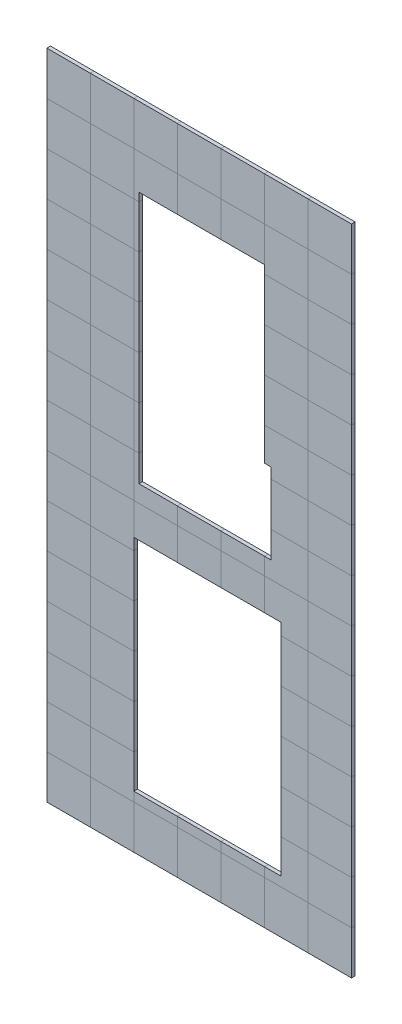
SolidWorks part; units mm, degrees
ref_plane "Plan de face" through (0, 0, 0) normal (0, 0, 1) x (1, 0, 0)
ref_plane "Plan de dessus" through (0, 0, 0) normal (0, 1, 0) x (1, 0, 0)
ref_plane "Plan de droite" through (0, 0, 0) normal (1, 0, 0) x (0, 0, -1)
sketch "Model" plane through (0, 0, 0) normal (0, 0, 1) x (1, 0, 0)
  line L0 (29717.7404, 66465.2853) -> (29717.7404, 67065.2853)
  line L1 (29717.7404, 67065.2853) -> (29717.7404, 66465.2853)
  line L2 (29717.7404, 67065.2853) -> (29117.7404, 67065.2853)
  line L3 (29117.7404, 67065.2853) -> (29717.7404, 67065.2853)
  line L4 (29117.7404, 66465.2853) -> (29717.7404, 66465.2853)
  line L5 (29717.7404, 66465.2853) -> (29117.7404, 66465.2853)
  line L6 (29717.7404, 67065.2853) -> (29717.7404, 66465.2853)
  line L7 (29717.7404, 66465.2853) -> (29117.7404, 66465.2853)
  line L8 (29117.7404, 66465.2853) -> (29117.7404, 67065.2853)
  line L9 (29117.7404, 67065.2853) -> (29717.7404, 67065.2853)
  line L10 (29717.7404, 66465.2853) -> (29717.7404, 67065.2853)
  line L11 (29717.7404, 67065.2853) -> (29117.7404, 67065.2853)
  line L12 (29117.7404, 67065.2853) -> (29117.7404, 66465.2853)
  line L13 (29117.7404, 66465.2853) -> (29717.7404, 66465.2853)
  line L14 (30317.7404, 66465.2853) -> (30317.7404, 67065.2853)
  line L15 (30317.7404, 67065.2853) -> (30317.7404, 66465.2853)
  line L16 (30317.7404, 67065.2853) -> (29717.7404, 67065.2853)
  line L17 (29717.7404, 67065.2853) -> (30317.7404, 67065.2853)
  line L18 (29717.7404, 67065.2853) -> (29717.7404, 66465.2853)
  line L19 (29717.7404, 66465.2853) -> (29717.7404, 67065.2853)
  line L20 (29717.7404, 66465.2853) -> (30317.7404, 66465.2853)
  line L21 (30317.7404, 66465.2853) -> (29717.7404, 66465.2853)
  line L22 (30317.7404, 67065.2853) -> (30317.7404, 66465.2853)
  line L23 (30317.7404, 66465.2853) -> (29717.7404, 66465.2853)
  line L24 (29717.7404, 66465.2853) -> (29717.7404, 67065.2853)
  line L25 (29717.7404, 67065.2853) -> (30317.7404, 67065.2853)
  line L26 (30317.7404, 66465.2853) -> (30317.7404, 67065.2853)
  line L27 (30317.7404, 67065.2853) -> (29717.7404, 67065.2853)
  line L28 (29717.7404, 67065.2853) -> (29717.7404, 66465.2853)
  line L29 (29717.7404, 66465.2853) -> (30317.7404, 66465.2853)
  line L30 (30917.7404, 66465.2853) -> (30917.7404, 67065.2853)
  line L31 (30917.7404, 67065.2853) -> (30917.7404, 66465.2853)
  line L32 (30917.7404, 67065.2853) -> (30317.7404, 67065.2853)
  line L33 (30317.7404, 67065.2853) -> (30917.7404, 67065.2853)
  line L34 (30317.7404, 67065.2853) -> (30317.7404, 66465.2853)
  line L35 (30317.7404, 66465.2853) -> (30317.7404, 67065.2853)
  line L36 (30317.7404, 66465.2853) -> (30917.7404, 66465.2853)
  line L37 (30917.7404, 66465.2853) -> (30317.7404, 66465.2853)
  line L38 (30917.7404, 67065.2853) -> (30917.7404, 66465.2853)
  line L39 (30917.7404, 66465.2853) -> (30317.7404, 66465.2853)
  line L40 (30317.7404, 66465.2853) -> (30317.7404, 67065.2853)
  line L41 (30317.7404, 67065.2853) -> (30917.7404, 67065.2853)
  line L42 (30917.7404, 66465.2853) -> (30917.7404, 67065.2853)
  line L43 (30917.7404, 67065.2853) -> (30317.7404, 67065.2853)
  line L44 (30317.7404, 67065.2853) -> (30317.7404, 66465.2853)
  line L45 (30317.7404, 66465.2853) -> (30917.7404, 66465.2853)
  line L46 (31517.7404, 66465.2853) -> (31517.7404, 67065.2853)
  line L47 (31517.7404, 67065.2853) -> (31517.7404, 66465.2853)
  line L48 (31517.7404, 67065.2853) -> (30917.7404, 67065.2853)
  line L49 (30917.7404, 67065.2853) -> (31517.7404, 67065.2853)
  line L50 (30917.7404, 67065.2853) -> (30917.7404, 66465.2853)
  line L51 (30917.7404, 66465.2853) -> (30917.7404, 67065.2853)
  line L52 (30917.7404, 66465.2853) -> (31517.7404, 66465.2853)
  line L53 (31517.7404, 66465.2853) -> (30917.7404, 66465.2853)
  line L54 (31517.7404, 67065.2853) -> (31517.7404, 66465.2853)
  line L55 (31517.7404, 66465.2853) -> (30917.7404, 66465.2853)
  line L56 (30917.7404, 66465.2853) -> (30917.7404, 67065.2853)
  line L57 (30917.7404, 67065.2853) -> (31517.7404, 67065.2853)
  line L58 (31517.7404, 66465.2853) -> (31517.7404, 67065.2853)
  line L59 (31517.7404, 67065.2853) -> (30917.7404, 67065.2853)
  line L60 (30917.7404, 67065.2853) -> (30917.7404, 66465.2853)
  line L61 (30917.7404, 66465.2853) -> (31517.7404, 66465.2853)
  line L62 (32117.7404, 66465.2853) -> (32117.7404, 67065.2853)
  line L63 (32117.7404, 67065.2853) -> (32117.7404, 66465.2853)
  line L64 (32117.7404, 67065.2853) -> (31517.7404, 67065.2853)
  line L65 (31517.7404, 67065.2853) -> (32117.7404, 67065.2853)
  line L66 (31517.7404, 67065.2853) -> (31517.7404, 66465.2853)
  line L67 (31517.7404, 66465.2853) -> (31517.7404, 67065.2853)
  line L68 (31517.7404, 66465.2853) -> (32117.7404, 66465.2853)
  line L69 (32117.7404, 66465.2853) -> (31517.7404, 66465.2853)
  line L70 (32117.7404, 67065.2853) -> (32117.7404, 66465.2853)
  line L71 (32117.7404, 66465.2853) -> (31517.7404, 66465.2853)
  line L72 (31517.7404, 66465.2853) -> (31517.7404, 67065.2853)
  line L73 (31517.7404, 67065.2853) -> (32117.7404, 67065.2853)
  line L74 (32117.7404, 66465.2853) -> (32117.7404, 67065.2853)
  line L75 (32117.7404, 67065.2853) -> (31517.7404, 67065.2853)
  line L76 (31517.7404, 67065.2853) -> (31517.7404, 66465.2853)
  line L77 (31517.7404, 66465.2853) -> (32117.7404, 66465.2853)
  line L78 (29717.7404, 65865.2853) -> (29717.7404, 66465.2853)
  line L79 (29717.7404, 66465.2853) -> (29717.7404, 65865.2853)
  line L80 (29717.7404, 66465.2853) -> (29117.7404, 66465.2853)
  line L81 (29117.7404, 66465.2853) -> (29717.7404, 66465.2853)
  line L82 (29117.7404, 65865.2853) -> (29717.7404, 65865.2853)
  line L83 (29717.7404, 65865.2853) -> (29117.7404, 65865.2853)
  line L84 (29717.7404, 66465.2853) -> (29717.7404, 65865.2853)
  line L85 (29717.7404, 65865.2853) -> (29117.7404, 65865.2853)
  line L86 (29117.7404, 65865.2853) -> (29117.7404, 66465.2853)
  line L87 (29117.7404, 66465.2853) -> (29717.7404, 66465.2853)
  line L88 (29717.7404, 65865.2853) -> (29717.7404, 66465.2853)
  line L89 (29717.7404, 66465.2853) -> (29117.7404, 66465.2853)
  line L90 (29117.7404, 66465.2853) -> (29117.7404, 65865.2853)
  line L91 (29117.7404, 65865.2853) -> (29717.7404, 65865.2853)
  line L92 (30317.7404, 65865.2853) -> (30317.7404, 66465.2853)
  line L93 (30317.7404, 66465.2853) -> (30317.7404, 65865.2853)
  line L94 (30317.7404, 66465.2853) -> (29717.7404, 66465.2853)
  line L95 (29717.7404, 66465.2853) -> (30317.7404, 66465.2853)
  line L96 (29717.7404, 66465.2853) -> (29717.7404, 65865.2853)
  line L97 (29717.7404, 65865.2853) -> (29717.7404, 66465.2853)
  line L98 (29717.7404, 65865.2853) -> (30317.7404, 65865.2853)
  line L99 (30317.7404, 65865.2853) -> (29717.7404, 65865.2853)
  line L100 (30317.7404, 66465.2853) -> (30317.7404, 65865.2853)
  line L101 (30317.7404, 65865.2853) -> (29717.7404, 65865.2853)
  line L102 (29717.7404, 65865.2853) -> (29717.7404, 66465.2853)
  line L103 (29717.7404, 66465.2853) -> (30317.7404, 66465.2853)
  line L104 (30317.7404, 65865.2853) -> (30317.7404, 66465.2853)
  line L105 (30317.7404, 66465.2853) -> (29717.7404, 66465.2853)
  line L106 (29717.7404, 66465.2853) -> (29717.7404, 65865.2853)
  line L107 (29717.7404, 65865.2853) -> (30317.7404, 65865.2853)
  line L108 (30917.7404, 65865.2853) -> (30917.7404, 66465.2853)
  line L109 (30917.7404, 66465.2853) -> (30917.7404, 65865.2853)
  line L110 (30917.7404, 66465.2853) -> (30317.7404, 66465.2853)
  line L111 (30317.7404, 66465.2853) -> (30917.7404, 66465.2853)
  line L112 (30317.7404, 66465.2853) -> (30317.7404, 65865.2853)
  line L113 (30317.7404, 65865.2853) -> (30317.7404, 66465.2853)
  line L114 (30317.7404, 65865.2853) -> (30917.7404, 65865.2853)
  line L115 (30917.7404, 65865.2853) -> (30317.7404, 65865.2853)
  line L116 (30917.7404, 66465.2853) -> (30917.7404, 65865.2853)
  line L117 (30917.7404, 65865.2853) -> (30317.7404, 65865.2853)
  line L118 (30317.7404, 65865.2853) -> (30317.7404, 66465.2853)
  line L119 (30317.7404, 66465.2853) -> (30917.7404, 66465.2853)
  line L120 (30917.7404, 65865.2853) -> (30917.7404, 66465.2853)
  line L121 (30917.7404, 66465.2853) -> (30317.7404, 66465.2853)
  line L122 (30317.7404, 66465.2853) -> (30317.7404, 65865.2853)
  line L123 (30317.7404, 65865.2853) -> (30917.7404, 65865.2853)
  line L124 (32117.7204, 65865.2853) -> (32117.7204, 66465.2853)
  line L125 (32117.7204, 66465.2853) -> (32117.7204, 65865.2853)
  line L126 (32117.7204, 66465.2853) -> (31517.7204, 66465.2853)
  line L127 (31517.7204, 66465.2853) -> (32117.7204, 66465.2853)
  line L128 (31517.7204, 66465.2853) -> (31517.7204, 65865.2853)
  line L129 (31517.7204, 65865.2853) -> (31517.7204, 66465.2853)
  line L130 (31517.7204, 65865.2853) -> (32117.7204, 65865.2853)
  line L131 (32117.7204, 65865.2853) -> (31517.7204, 65865.2853)
  line L132 (32117.7204, 66465.2853) -> (32117.7204, 65865.2853)
  line L133 (32117.7204, 65865.2853) -> (31517.7204, 65865.2853)
  line L134 (31517.7204, 65865.2853) -> (31517.7204, 66465.2853)
  line L135 (31517.7204, 66465.2853) -> (32117.7204, 66465.2853)
  line L136 (32117.7204, 65865.2853) -> (32117.7204, 66465.2853)
  line L137 (32117.7204, 66465.2853) -> (31517.7204, 66465.2853)
  line L138 (31517.7204, 66465.2853) -> (31517.7204, 65865.2853)
  line L139 (31517.7204, 65865.2853) -> (32117.7204, 65865.2853)
  line L140 (31517.7204, 65865.2853) -> (31517.7204, 66465.2853)
  line L141 (31517.7204, 66465.2853) -> (31517.7204, 65865.2853)
  line L142 (31517.7204, 66465.2853) -> (30917.7204, 66465.2853)
  line L143 (30917.7204, 66465.2853) -> (31517.7204, 66465.2853)
  line L144 (30917.7204, 66465.2853) -> (30917.7204, 65865.2853)
  line L145 (30917.7204, 65865.2853) -> (30917.7204, 66465.2853)
  line L146 (30917.7204, 65865.2853) -> (31517.7204, 65865.2853)
  line L147 (31517.7204, 65865.2853) -> (30917.7204, 65865.2853)
  line L148 (31517.7204, 66465.2853) -> (31517.7204, 65865.2853)
  line L149 (31517.7204, 65865.2853) -> (30917.7204, 65865.2853)
  line L150 (30917.7204, 65865.2853) -> (30917.7204, 66465.2853)
  line L151 (30917.7204, 66465.2853) -> (31517.7204, 66465.2853)
  line L152 (31517.7204, 65865.2853) -> (31517.7204, 66465.2853)
  line L153 (31517.7204, 66465.2853) -> (30917.7204, 66465.2853)
  line L154 (30917.7204, 66465.2853) -> (30917.7204, 65865.2853)
  line L155 (30917.7204, 65865.2853) -> (31517.7204, 65865.2853)
  line L156 (29717.7404, 65265.2853) -> (29717.7404, 65865.2853)
  line L157 (29717.7404, 65865.2853) -> (29717.7404, 65265.2853)
  line L158 (29717.7404, 65865.2853) -> (29117.7404, 65865.2853)
  line L159 (29117.7404, 65865.2853) -> (29717.7404, 65865.2853)
  line L160 (29117.7404, 65265.2853) -> (29717.7404, 65265.2853)
  line L161 (29717.7404, 65265.2853) -> (29117.7404, 65265.2853)
  line L162 (29717.7404, 65865.2853) -> (29717.7404, 65265.2853)
  line L163 (29717.7404, 65265.2853) -> (29117.7404, 65265.2853)
  line L164 (29117.7404, 65265.2853) -> (29117.7404, 65865.2853)
  line L165 (29117.7404, 65865.2853) -> (29717.7404, 65865.2853)
  line L166 (29717.7404, 65265.2853) -> (29717.7404, 65865.2853)
  line L167 (29717.7404, 65865.2853) -> (29117.7404, 65865.2853)
  line L168 (29117.7404, 65865.2853) -> (29117.7404, 65265.2853)
  line L169 (29117.7404, 65265.2853) -> (29717.7404, 65265.2853)
  line L170 (30317.7404, 65265.2853) -> (30317.7404, 65865.2853)
  line L171 (30317.7404, 65865.2853) -> (30317.7404, 65265.2853)
  line L172 (30317.7404, 65865.2853) -> (29717.7404, 65865.2853)
  line L173 (29717.7404, 65865.2853) -> (30317.7404, 65865.2853)
  line L174 (29717.7404, 65865.2853) -> (29717.7404, 65265.2853)
  line L175 (29717.7404, 65265.2853) -> (29717.7404, 65865.2853)
  line L176 (29717.7404, 65265.2853) -> (30317.7404, 65265.2853)
  line L177 (30317.7404, 65265.2853) -> (29717.7404, 65265.2853)
  line L178 (30317.7404, 65865.2853) -> (30317.7404, 65265.2853)
  line L179 (30317.7404, 65265.2853) -> (29717.7404, 65265.2853)
  line L180 (29717.7404, 65265.2853) -> (29717.7404, 65865.2853)
  line L181 (29717.7404, 65865.2853) -> (30317.7404, 65865.2853)
  line L182 (30317.7404, 65265.2853) -> (30317.7404, 65865.2853)
  line L183 (30317.7404, 65865.2853) -> (29717.7404, 65865.2853)
  line L184 (29717.7404, 65865.2853) -> (29717.7404, 65265.2853)
  line L185 (29717.7404, 65265.2853) -> (30317.7404, 65265.2853)
  line L186 (30917.7404, 65265.2853) -> (30917.7404, 65865.2853)
  line L187 (30917.7404, 65865.2853) -> (30917.7404, 65265.2853)
  line L188 (30917.7404, 65865.2853) -> (30317.7404, 65865.2853)
  line L189 (30317.7404, 65865.2853) -> (30917.7404, 65865.2853)
  line L190 (30317.7404, 65865.2853) -> (30317.7404, 65265.2853)
  line L191 (30317.7404, 65265.2853) -> (30317.7404, 65865.2853)
  line L192 (30317.7404, 65265.2853) -> (30917.7404, 65265.2853)
  line L193 (30917.7404, 65265.2853) -> (30317.7404, 65265.2853)
  line L194 (30917.7404, 65865.2853) -> (30917.7404, 65265.2853)
  line L195 (30917.7404, 65265.2853) -> (30317.7404, 65265.2853)
  line L196 (30317.7404, 65265.2853) -> (30317.7404, 65865.2853)
  line L197 (30317.7404, 65865.2853) -> (30917.7404, 65865.2853)
  line L198 (30917.7404, 65265.2853) -> (30917.7404, 65865.2853)
  line L199 (30917.7404, 65865.2853) -> (30317.7404, 65865.2853)
  line L200 (30317.7404, 65865.2853) -> (30317.7404, 65265.2853)
  line L201 (30317.7404, 65265.2853) -> (30917.7404, 65265.2853)
  line L202 (31517.7204, 65265.2853) -> (31517.7204, 65865.2853)
  line L203 (31517.7204, 65865.2853) -> (31517.7204, 65265.2853)
  line L204 (31517.7204, 65865.2853) -> (30917.7204, 65865.2853)
  line L205 (30917.7204, 65865.2853) -> (31517.7204, 65865.2853)
  line L206 (30917.7204, 65865.2853) -> (30917.7204, 65265.2853)
  line L207 (30917.7204, 65265.2853) -> (30917.7204, 65865.2853)
  line L208 (30917.7204, 65265.2853) -> (31517.7204, 65265.2853)
  line L209 (31517.7204, 65265.2853) -> (30917.7204, 65265.2853)
  line L210 (31517.7204, 65865.2853) -> (31517.7204, 65265.2853)
  line L211 (31517.7204, 65265.2853) -> (30917.7204, 65265.2853)
  line L212 (30917.7204, 65265.2853) -> (30917.7204, 65865.2853)
  line L213 (30917.7204, 65865.2853) -> (31517.7204, 65865.2853)
  line L214 (31517.7204, 65265.2853) -> (31517.7204, 65865.2853)
  line L215 (31517.7204, 65865.2853) -> (30917.7204, 65865.2853)
  line L216 (30917.7204, 65865.2853) -> (30917.7204, 65265.2853)
  line L217 (30917.7204, 65265.2853) -> (31517.7204, 65265.2853)
  line L218 (32117.7204, 65265.2853) -> (32117.7204, 65865.2853)
  line L219 (32117.7204, 65865.2853) -> (32117.7204, 65265.2853)
  line L220 (32117.7204, 65865.2853) -> (31517.7204, 65865.2853)
  line L221 (31517.7204, 65865.2853) -> (32117.7204, 65865.2853)
  line L222 (31517.7204, 65865.2853) -> (31517.7204, 65265.2853)
  line L223 (31517.7204, 65265.2853) -> (31517.7204, 65865.2853)
  line L224 (31517.7204, 65265.2853) -> (32117.7204, 65265.2853)
  line L225 (32117.7204, 65265.2853) -> (31517.7204, 65265.2853)
  line L226 (32117.7204, 65865.2853) -> (32117.7204, 65265.2853)
  line L227 (32117.7204, 65265.2853) -> (31517.7204, 65265.2853)
  line L228 (31517.7204, 65265.2853) -> (31517.7204, 65865.2853)
  line L229 (31517.7204, 65865.2853) -> (32117.7204, 65865.2853)
  line L230 (32117.7204, 65265.2853) -> (32117.7204, 65865.2853)
  line L231 (32117.7204, 65865.2853) -> (31517.7204, 65865.2853)
  line L232 (31517.7204, 65865.2853) -> (31517.7204, 65265.2853)
  line L233 (31517.7204, 65265.2853) -> (32117.7204, 65265.2853)
  line L234 (29717.7404, 64665.2853) -> (29717.7404, 65265.2853)
  line L235 (29717.7404, 65265.2853) -> (29717.7404, 64665.2853)
  line L236 (29717.7404, 65265.2853) -> (29117.7404, 65265.2853)
  line L237 (29117.7404, 65265.2853) -> (29717.7404, 65265.2853)
  line L238 (29717.7404, 65265.2853) -> (29717.7404, 64665.2853)
  line L239 (29717.7404, 64665.2853) -> (29117.7404, 64665.2853)
  line L240 (29117.7404, 64665.2853) -> (29117.7404, 65265.2853)
  line L241 (29117.7404, 65265.2853) -> (29717.7404, 65265.2853)
  line L242 (29717.7404, 64665.2853) -> (29717.7404, 65265.2853)
  line L243 (29717.7404, 65265.2853) -> (29117.7404, 65265.2853)
  line L244 (29117.7404, 65265.2853) -> (29117.7404, 64665.2853)
  line L245 (29117.7404, 64665.2853) -> (29717.7404, 64665.2853)
  line L246 (30317.7404, 64665.2853) -> (30317.7404, 65265.2853)
  line L247 (30317.7404, 65265.2853) -> (30317.7404, 64665.2853)
  line L248 (30317.7404, 65265.2853) -> (29717.7404, 65265.2853)
  line L249 (29717.7404, 65265.2853) -> (30317.7404, 65265.2853)
  line L250 (29717.7404, 65265.2853) -> (29717.7404, 64665.2853)
  line L251 (29717.7404, 64665.2853) -> (29717.7404, 65265.2853)
  line L252 (30317.7404, 65265.2853) -> (30317.7404, 64665.2853)
  line L253 (30317.7404, 64665.2853) -> (29717.7404, 64665.2853)
  line L254 (29717.7404, 64665.2853) -> (29717.7404, 65265.2853)
  line L255 (29717.7404, 65265.2853) -> (30317.7404, 65265.2853)
  line L256 (30317.7404, 64665.2853) -> (30317.7404, 65265.2853)
  line L257 (30317.7404, 65265.2853) -> (29717.7404, 65265.2853)
  line L258 (29717.7404, 65265.2853) -> (29717.7404, 64665.2853)
  line L259 (29717.7404, 64665.2853) -> (30317.7404, 64665.2853)
  line L260 (30917.7404, 64665.2853) -> (30917.7404, 65265.2853)
  line L261 (30917.7404, 65265.2853) -> (30917.7404, 64665.2853)
  line L262 (30917.7404, 65265.2853) -> (30317.7404, 65265.2853)
  line L263 (30317.7404, 65265.2853) -> (30917.7404, 65265.2853)
  line L264 (30317.7404, 65265.2853) -> (30317.7404, 64665.2853)
  line L265 (30317.7404, 64665.2853) -> (30317.7404, 65265.2853)
  line L266 (30917.7404, 65265.2853) -> (30917.7404, 64665.2853)
  line L267 (30917.7404, 64665.2853) -> (30317.7404, 64665.2853)
  line L268 (30317.7404, 64665.2853) -> (30317.7404, 65265.2853)
  line L269 (30317.7404, 65265.2853) -> (30917.7404, 65265.2853)
  line L270 (30917.7404, 64665.2853) -> (30917.7404, 65265.2853)
  line L271 (30917.7404, 65265.2853) -> (30317.7404, 65265.2853)
  line L272 (30317.7404, 65265.2853) -> (30317.7404, 64665.2853)
  line L273 (30317.7404, 64665.2853) -> (30917.7404, 64665.2853)
  line L274 (31517.7204, 64665.2853) -> (31517.7204, 65265.2853)
  line L275 (31517.7204, 65265.2853) -> (31517.7204, 64665.2853)
  line L276 (31517.7204, 65265.2853) -> (30917.7204, 65265.2853)
  line L277 (30917.7204, 65265.2853) -> (31517.7204, 65265.2853)
  line L278 (30917.7204, 65265.2853) -> (30917.7204, 64665.2853)
  line L279 (30917.7204, 64665.2853) -> (30917.7204, 65265.2853)
  line L280 (31517.7204, 65265.2853) -> (31517.7204, 64665.2853)
  line L281 (31517.7204, 64665.2853) -> (30917.7204, 64665.2853)
  line L282 (30917.7204, 64665.2853) -> (30917.7204, 65265.2853)
  line L283 (30917.7204, 65265.2853) -> (31517.7204, 65265.2853)
  line L284 (31517.7204, 64665.2853) -> (31517.7204, 65265.2853)
  line L285 (31517.7204, 65265.2853) -> (30917.7204, 65265.2853)
  line L286 (30917.7204, 65265.2853) -> (30917.7204, 64665.2853)
  line L287 (30917.7204, 64665.2853) -> (31517.7204, 64665.2853)
  line L288 (32117.7204, 64665.2853) -> (32117.7204, 65265.2853)
  line L289 (32117.7204, 65265.2853) -> (32117.7204, 64665.2853)
  line L290 (32117.7204, 65265.2853) -> (31517.7204, 65265.2853)
  line L291 (31517.7204, 65265.2853) -> (32117.7204, 65265.2853)
  line L292 (31517.7204, 65265.2853) -> (31517.7204, 64665.2853)
  line L293 (31517.7204, 64665.2853) -> (31517.7204, 65265.2853)
  line L294 (32117.7204, 65265.2853) -> (32117.7204, 64665.2853)
  line L295 (32117.7204, 64665.2853) -> (31517.7204, 64665.2853)
  line L296 (31517.7204, 64665.2853) -> (31517.7204, 65265.2853)
  line L297 (31517.7204, 65265.2853) -> (32117.7204, 65265.2853)
  line L298 (32117.7204, 64665.2853) -> (32117.7204, 65265.2853)
  line L299 (32117.7204, 65265.2853) -> (31517.7204, 65265.2853)
  line L300 (31517.7204, 65265.2853) -> (31517.7204, 64665.2853)
  line L301 (31517.7204, 64665.2853) -> (32117.7204, 64665.2853)
  line L302 (32717.7404, 66465.2853) -> (32717.7404, 67065.2853)
  line L303 (32717.7404, 67065.2853) -> (32717.7404, 66465.2853)
  line L304 (32717.7404, 67065.2853) -> (32117.7404, 67065.2853)
  line L305 (32117.7404, 67065.2853) -> (32717.7404, 67065.2853)
  line L306 (32117.7404, 67065.2853) -> (32117.7404, 66465.2853)
  line L307 (32117.7404, 66465.2853) -> (32117.7404, 67065.2853)
  line L308 (32117.7404, 66465.2853) -> (32717.7404, 66465.2853)
  line L309 (32717.7404, 66465.2853) -> (32117.7404, 66465.2853)
  line L310 (32717.7404, 67065.2853) -> (32717.7404, 66465.2853)
  line L311 (32717.7404, 66465.2853) -> (32117.7404, 66465.2853)
  line L312 (32117.7404, 66465.2853) -> (32117.7404, 67065.2853)
  line L313 (32117.7404, 67065.2853) -> (32717.7404, 67065.2853)
  line L314 (32717.7404, 66465.2853) -> (32717.7404, 67065.2853)
  line L315 (32717.7404, 67065.2853) -> (32117.7404, 67065.2853)
  line L316 (32117.7404, 67065.2853) -> (32117.7404, 66465.2853)
  line L317 (32117.7404, 66465.2853) -> (32717.7404, 66465.2853)
  line L318 (32717.7404, 65865.2853) -> (32717.7404, 66465.2853)
  line L319 (32717.7404, 66465.2853) -> (32717.7404, 65865.2853)
  line L320 (32717.7404, 66465.2853) -> (32117.7404, 66465.2853)
  line L321 (32117.7404, 66465.2853) -> (32717.7404, 66465.2853)
  line L322 (32117.7404, 66465.2853) -> (32117.7404, 65865.2853)
  line L323 (32117.7404, 65865.2853) -> (32117.7404, 66465.2853)
  line L324 (32117.7404, 65865.2853) -> (32717.7404, 65865.2853)
  line L325 (32717.7404, 65865.2853) -> (32117.7404, 65865.2853)
  line L326 (32717.7404, 66465.2853) -> (32717.7404, 65865.2853)
  line L327 (32717.7404, 65865.2853) -> (32117.7404, 65865.2853)
  line L328 (32117.7404, 65865.2853) -> (32117.7404, 66465.2853)
  line L329 (32117.7404, 66465.2853) -> (32717.7404, 66465.2853)
  line L330 (32717.7404, 65865.2853) -> (32717.7404, 66465.2853)
  line L331 (32717.7404, 66465.2853) -> (32117.7404, 66465.2853)
  line L332 (32117.7404, 66465.2853) -> (32117.7404, 65865.2853)
  line L333 (32117.7404, 65865.2853) -> (32717.7404, 65865.2853)
  line L334 (32717.7404, 65265.2853) -> (32717.7404, 65865.2853)
  line L335 (32717.7404, 65865.2853) -> (32717.7404, 65265.2853)
  line L336 (32717.7404, 65865.2853) -> (32117.7404, 65865.2853)
  line L337 (32117.7404, 65865.2853) -> (32717.7404, 65865.2853)
  line L338 (32117.7404, 65865.2853) -> (32117.7404, 65265.2853)
  line L339 (32117.7404, 65265.2853) -> (32117.7404, 65865.2853)
  line L340 (32117.7404, 65265.2853) -> (32717.7404, 65265.2853)
  line L341 (32717.7404, 65265.2853) -> (32117.7404, 65265.2853)
  line L342 (32717.7404, 65865.2853) -> (32717.7404, 65265.2853)
  line L343 (32717.7404, 65265.2853) -> (32117.7404, 65265.2853)
  line L344 (32117.7404, 65265.2853) -> (32117.7404, 65865.2853)
  line L345 (32117.7404, 65865.2853) -> (32717.7404, 65865.2853)
  line L346 (32717.7404, 65265.2853) -> (32717.7404, 65865.2853)
  line L347 (32717.7404, 65865.2853) -> (32117.7404, 65865.2853)
  line L348 (32117.7404, 65865.2853) -> (32117.7404, 65265.2853)
  line L349 (32117.7404, 65265.2853) -> (32717.7404, 65265.2853)
  line L350 (32717.7404, 64665.2853) -> (32717.7404, 65265.2853)
  line L351 (32717.7404, 65265.2853) -> (32717.7404, 64665.2853)
  line L352 (32717.7404, 65265.2853) -> (32117.7404, 65265.2853)
  line L353 (32117.7404, 65265.2853) -> (32717.7404, 65265.2853)
  line L354 (32117.7404, 65265.2853) -> (32117.7404, 64665.2853)
  line L355 (32117.7404, 64665.2853) -> (32117.7404, 65265.2853)
  line L356 (32717.7404, 65265.2853) -> (32717.7404, 64665.2853)
  line L357 (32717.7404, 64665.2853) -> (32117.7404, 64665.2853)
  line L358 (32117.7404, 64665.2853) -> (32117.7404, 65265.2853)
  line L359 (32117.7404, 65265.2853) -> (32717.7404, 65265.2853)
  line L360 (32717.7404, 64665.2853) -> (32717.7404, 65265.2853)
  line L361 (32717.7404, 65265.2853) -> (32117.7404, 65265.2853)
  line L362 (32117.7404, 65265.2853) -> (32117.7404, 64665.2853)
  line L363 (32117.7404, 64665.2853) -> (32717.7404, 64665.2853)
  line L364 (33317.7404, 66465.2853) -> (33317.7404, 67065.2853)
  line L365 (33317.7404, 67065.2853) -> (33317.7404, 66465.2853)
  line L366 (33317.7404, 67065.2853) -> (32717.7404, 67065.2853)
  line L367 (32717.7404, 67065.2853) -> (33317.7404, 67065.2853)
  line L368 (32717.7404, 67065.2853) -> (32717.7404, 66465.2853)
  line L369 (32717.7404, 66465.2853) -> (32717.7404, 67065.2853)
  line L370 (32717.7404, 66465.2853) -> (33317.7404, 66465.2853)
  line L371 (33317.7404, 66465.2853) -> (32717.7404, 66465.2853)
  line L372 (33317.7404, 67065.2853) -> (33317.7404, 66465.2853)
  line L373 (33317.7404, 66465.2853) -> (32717.7404, 66465.2853)
  line L374 (32717.7404, 66465.2853) -> (32717.7404, 67065.2853)
  line L375 (32717.7404, 67065.2853) -> (33317.7404, 67065.2853)
  line L376 (33317.7404, 66465.2853) -> (33317.7404, 67065.2853)
  line L377 (33317.7404, 67065.2853) -> (32717.7404, 67065.2853)
  line L378 (32717.7404, 67065.2853) -> (32717.7404, 66465.2853)
  line L379 (32717.7404, 66465.2853) -> (33317.7404, 66465.2853)
  line L380 (33317.7404, 65865.2853) -> (33317.7404, 66465.2853)
  line L381 (33317.7404, 66465.2853) -> (33317.7404, 65865.2853)
  line L382 (33317.7404, 66465.2853) -> (32717.7404, 66465.2853)
  line L383 (32717.7404, 66465.2853) -> (33317.7404, 66465.2853)
  line L384 (32717.7404, 66465.2853) -> (32717.7404, 65865.2853)
  line L385 (32717.7404, 65865.2853) -> (32717.7404, 66465.2853)
  line L386 (32717.7404, 65865.2853) -> (33317.7404, 65865.2853)
  line L387 (33317.7404, 65865.2853) -> (32717.7404, 65865.2853)
  line L388 (33317.7404, 66465.2853) -> (33317.7404, 65865.2853)
  line L389 (33317.7404, 65865.2853) -> (32717.7404, 65865.2853)
  line L390 (32717.7404, 65865.2853) -> (32717.7404, 66465.2853)
  line L391 (32717.7404, 66465.2853) -> (33317.7404, 66465.2853)
  line L392 (33317.7404, 65865.2853) -> (33317.7404, 66465.2853)
  line L393 (33317.7404, 66465.2853) -> (32717.7404, 66465.2853)
  line L394 (32717.7404, 66465.2853) -> (32717.7404, 65865.2853)
  line L395 (32717.7404, 65865.2853) -> (33317.7404, 65865.2853)
  line L396 (33317.7404, 65265.2853) -> (33317.7404, 65865.2853)
  line L397 (33317.7404, 65865.2853) -> (33317.7404, 65265.2853)
  line L398 (33317.7404, 65865.2853) -> (32717.7404, 65865.2853)
  line L399 (32717.7404, 65865.2853) -> (33317.7404, 65865.2853)
  line L400 (32717.7404, 65865.2853) -> (32717.7404, 65265.2853)
  line L401 (32717.7404, 65265.2853) -> (32717.7404, 65865.2853)
  line L402 (32717.7404, 65265.2853) -> (33317.7404, 65265.2853)
  line L403 (33317.7404, 65265.2853) -> (32717.7404, 65265.2853)
  line L404 (33317.7404, 65865.2853) -> (33317.7404, 65265.2853)
  line L405 (33317.7404, 65265.2853) -> (32717.7404, 65265.2853)
  line L406 (32717.7404, 65265.2853) -> (32717.7404, 65865.2853)
  line L407 (32717.7404, 65865.2853) -> (33317.7404, 65865.2853)
  line L408 (33317.7404, 65265.2853) -> (33317.7404, 65865.2853)
  line L409 (33317.7404, 65865.2853) -> (32717.7404, 65865.2853)
  line L410 (32717.7404, 65865.2853) -> (32717.7404, 65265.2853)
  line L411 (32717.7404, 65265.2853) -> (33317.7404, 65265.2853)
  line L412 (33317.7404, 64665.2853) -> (33317.7404, 65265.2853)
  line L413 (33317.7404, 65265.2853) -> (33317.7404, 64665.2853)
  line L414 (33317.7404, 65265.2853) -> (32717.7404, 65265.2853)
  line L415 (32717.7404, 65265.2853) -> (33317.7404, 65265.2853)
  line L416 (32717.7404, 65265.2853) -> (32717.7404, 64665.2853)
  line L417 (32717.7404, 64665.2853) -> (32717.7404, 65265.2853)
  line L418 (33317.7404, 65265.2853) -> (33317.7404, 64665.2853)
  line L419 (33317.7404, 64665.2853) -> (32717.7404, 64665.2853)
  line L420 (32717.7404, 64665.2853) -> (32717.7404, 65265.2853)
  line L421 (32717.7404, 65265.2853) -> (33317.7404, 65265.2853)
  line L422 (33317.7404, 64665.2853) -> (33317.7404, 65265.2853)
  line L423 (33317.7404, 65265.2853) -> (32717.7404, 65265.2853)
  line L424 (32717.7404, 65265.2853) -> (32717.7404, 64665.2853)
  line L425 (32717.7404, 64665.2853) -> (33317.7404, 64665.2853)
  line L426 (33917.7404, 66465.2853) -> (33917.7404, 67065.2853)
  line L427 (33917.7404, 67065.2853) -> (33917.7404, 66465.2853)
  line L428 (33917.7404, 67065.2853) -> (33317.7404, 67065.2853)
  line L429 (33317.7404, 67065.2853) -> (33917.7404, 67065.2853)
  line L430 (33317.7404, 67065.2853) -> (33317.7404, 66465.2853)
  line L431 (33317.7404, 66465.2853) -> (33317.7404, 67065.2853)
  line L432 (33317.7404, 66465.2853) -> (33917.7404, 66465.2853)
  line L433 (33917.7404, 66465.2853) -> (33317.7404, 66465.2853)
  line L434 (33917.7404, 67065.2853) -> (33917.7404, 66465.2853)
  line L435 (33917.7404, 66465.2853) -> (33317.7404, 66465.2853)
  line L436 (33317.7404, 66465.2853) -> (33317.7404, 67065.2853)
  line L437 (33317.7404, 67065.2853) -> (33917.7404, 67065.2853)
  line L438 (33917.7404, 66465.2853) -> (33917.7404, 67065.2853)
  line L439 (33917.7404, 67065.2853) -> (33317.7404, 67065.2853)
  line L440 (33317.7404, 67065.2853) -> (33317.7404, 66465.2853)
  line L441 (33317.7404, 66465.2853) -> (33917.7404, 66465.2853)
  line L442 (33917.7404, 65865.2853) -> (33917.7404, 66465.2853)
  line L443 (33917.7404, 66465.2853) -> (33917.7404, 65865.2853)
  line L444 (33917.7404, 66465.2853) -> (33317.7404, 66465.2853)
  line L445 (33317.7404, 66465.2853) -> (33917.7404, 66465.2853)
  line L446 (33317.7404, 66465.2853) -> (33317.7404, 65865.2853)
  line L447 (33317.7404, 65865.2853) -> (33317.7404, 66465.2853)
  line L448 (33317.7404, 65865.2853) -> (33917.7404, 65865.2853)
  line L449 (33917.7404, 65865.2853) -> (33317.7404, 65865.2853)
  line L450 (33917.7404, 66465.2853) -> (33917.7404, 65865.2853)
  line L451 (33917.7404, 65865.2853) -> (33317.7404, 65865.2853)
  line L452 (33317.7404, 65865.2853) -> (33317.7404, 66465.2853)
  line L453 (33317.7404, 66465.2853) -> (33917.7404, 66465.2853)
  line L454 (33917.7404, 65865.2853) -> (33917.7404, 66465.2853)
  line L455 (33917.7404, 66465.2853) -> (33317.7404, 66465.2853)
  line L456 (33317.7404, 66465.2853) -> (33317.7404, 65865.2853)
  line L457 (33317.7404, 65865.2853) -> (33917.7404, 65865.2853)
  line L458 (33917.7404, 65265.2853) -> (33917.7404, 65865.2853)
  line L459 (33917.7404, 65865.2853) -> (33917.7404, 65265.2853)
  line L460 (33917.7404, 65865.2853) -> (33317.7404, 65865.2853)
  line L461 (33317.7404, 65865.2853) -> (33917.7404, 65865.2853)
  line L462 (33317.7404, 65865.2853) -> (33317.7404, 65265.2853)
  line L463 (33317.7404, 65265.2853) -> (33317.7404, 65865.2853)
  line L464 (33317.7404, 65265.2853) -> (33917.7404, 65265.2853)
  line L465 (33917.7404, 65265.2853) -> (33317.7404, 65265.2853)
  line L466 (33917.7404, 65865.2853) -> (33917.7404, 65265.2853)
  line L467 (33917.7404, 65265.2853) -> (33317.7404, 65265.2853)
  line L468 (33317.7404, 65265.2853) -> (33317.7404, 65865.2853)
  line L469 (33317.7404, 65865.2853) -> (33917.7404, 65865.2853)
  line L470 (33917.7404, 65265.2853) -> (33917.7404, 65865.2853)
  line L471 (33917.7404, 65865.2853) -> (33317.7404, 65865.2853)
  line L472 (33317.7404, 65865.2853) -> (33317.7404, 65265.2853)
  line L473 (33317.7404, 65265.2853) -> (33917.7404, 65265.2853)
  line L474 (33917.7404, 64665.2853) -> (33917.7404, 65265.2853)
  line L475 (33917.7404, 65265.2853) -> (33917.7404, 64665.2853)
  line L476 (33917.7404, 65265.2853) -> (33317.7404, 65265.2853)
  line L477 (33317.7404, 65265.2853) -> (33917.7404, 65265.2853)
  line L478 (33317.7404, 65265.2853) -> (33317.7404, 64665.2853)
  line L479 (33317.7404, 64665.2853) -> (33317.7404, 65265.2853)
  line L480 (33917.7404, 65265.2853) -> (33917.7404, 64665.2853)
  line L481 (33917.7404, 64665.2853) -> (33317.7404, 64665.2853)
  line L482 (33317.7404, 64665.2853) -> (33317.7404, 65265.2853)
  line L483 (33317.7404, 65265.2853) -> (33917.7404, 65265.2853)
  line L484 (33917.7404, 64665.2853) -> (33917.7404, 65265.2853)
  line L485 (33917.7404, 65265.2853) -> (33317.7404, 65265.2853)
  line L486 (33317.7404, 65265.2853) -> (33317.7404, 64665.2853)
  line L487 (33317.7404, 64665.2853) -> (33917.7404, 64665.2853)
  line L488 (34517.7404, 67065.2853) -> (33917.7404, 67065.2853)
  line L489 (33917.7404, 67065.2853) -> (34517.7404, 67065.2853)
  line L490 (33917.7404, 67065.2853) -> (33917.7404, 66465.2853)
  line L491 (33917.7404, 66465.2853) -> (33917.7404, 67065.2853)
  line L492 (33917.7404, 66465.2853) -> (34517.7404, 66465.2853)
  line L493 (34517.7404, 66465.2853) -> (33917.7404, 66465.2853)
  line L494 (34517.7404, 67065.2853) -> (34517.7404, 66465.2853)
  line L495 (34517.7404, 66465.2853) -> (33917.7404, 66465.2853)
  line L496 (33917.7404, 66465.2853) -> (33917.7404, 67065.2853)
  line L497 (33917.7404, 67065.2853) -> (34517.7404, 67065.2853)
  line L498 (34517.7404, 66465.2853) -> (34517.7404, 67065.2853)
  line L499 (34517.7404, 67065.2853) -> (33917.7404, 67065.2853)
  line L500 (33917.7404, 67065.2853) -> (33917.7404, 66465.2853)
  line L501 (33917.7404, 66465.2853) -> (34517.7404, 66465.2853)
  line L502 (34517.7404, 66465.2853) -> (33917.7404, 66465.2853)
  line L503 (33917.7404, 66465.2853) -> (34517.7404, 66465.2853)
  line L504 (33917.7404, 66465.2853) -> (33917.7404, 65865.2853)
  line L505 (33917.7404, 65865.2853) -> (33917.7404, 66465.2853)
  line L506 (33917.7404, 65865.2853) -> (34517.7404, 65865.2853)
  line L507 (34517.7404, 65865.2853) -> (33917.7404, 65865.2853)
  line L508 (34517.7404, 66465.2853) -> (34517.7404, 65865.2853)
  line L509 (34517.7404, 65865.2853) -> (33917.7404, 65865.2853)
  line L510 (33917.7404, 65865.2853) -> (33917.7404, 66465.2853)
  line L511 (33917.7404, 66465.2853) -> (34517.7404, 66465.2853)
  line L512 (34517.7404, 65865.2853) -> (34517.7404, 66465.2853)
  line L513 (34517.7404, 66465.2853) -> (33917.7404, 66465.2853)
  line L514 (33917.7404, 66465.2853) -> (33917.7404, 65865.2853)
  line L515 (33917.7404, 65865.2853) -> (34517.7404, 65865.2853)
  line L516 (34517.7404, 65865.2853) -> (33917.7404, 65865.2853)
  line L517 (33917.7404, 65865.2853) -> (34517.7404, 65865.2853)
  line L518 (33917.7404, 65865.2853) -> (33917.7404, 65265.2853)
  line L519 (33917.7404, 65265.2853) -> (33917.7404, 65865.2853)
  line L520 (33917.7404, 65265.2853) -> (34517.7404, 65265.2853)
  line L521 (34517.7404, 65265.2853) -> (33917.7404, 65265.2853)
  line L522 (34517.7404, 65865.2853) -> (34517.7404, 65265.2853)
  line L523 (34517.7404, 65265.2853) -> (33917.7404, 65265.2853)
  line L524 (33917.7404, 65265.2853) -> (33917.7404, 65865.2853)
  line L525 (33917.7404, 65865.2853) -> (34517.7404, 65865.2853)
  line L526 (34517.7404, 65265.2853) -> (34517.7404, 65865.2853)
  line L527 (34517.7404, 65865.2853) -> (33917.7404, 65865.2853)
  line L528 (33917.7404, 65865.2853) -> (33917.7404, 65265.2853)
  line L529 (33917.7404, 65265.2853) -> (34517.7404, 65265.2853)
  line L530 (34517.7404, 65265.2853) -> (33917.7404, 65265.2853)
  line L531 (33917.7404, 65265.2853) -> (34517.7404, 65265.2853)
  line L532 (33917.7404, 65265.2853) -> (33917.7404, 64665.2853)
  line L533 (33917.7404, 64665.2853) -> (33917.7404, 65265.2853)
  line L534 (34517.7404, 65265.2853) -> (34517.7404, 64665.2853)
  line L535 (34517.7404, 64665.2853) -> (33917.7404, 64665.2853)
  line L536 (33917.7404, 64665.2853) -> (33917.7404, 65265.2853)
  line L537 (33917.7404, 65265.2853) -> (34517.7404, 65265.2853)
  line L538 (34517.7404, 64665.2853) -> (34517.7404, 65265.2853)
  line L539 (34517.7404, 65265.2853) -> (33917.7404, 65265.2853)
  line L540 (33917.7404, 65265.2853) -> (33917.7404, 64665.2853)
  line L541 (33917.7404, 64665.2853) -> (34517.7404, 64665.2853)
  line L542 (29717.7404, 69465.2853) -> (29717.7404, 70065.2853)
  line L543 (29717.7404, 70065.2853) -> (29717.7404, 69465.2853)
  line L544 (29117.7404, 69465.2853) -> (29717.7404, 69465.2853)
  line L545 (29717.7404, 69465.2853) -> (29117.7404, 69465.2853)
  line L546 (29717.7404, 70065.2853) -> (29717.7404, 69465.2853)
  line L547 (29717.7404, 69465.2853) -> (29117.7404, 69465.2853)
  line L548 (29117.7404, 69465.2853) -> (29117.7404, 70065.2853)
  line L549 (29117.7404, 70065.2853) -> (29717.7404, 70065.2853)
  line L550 (29717.7404, 69465.2853) -> (29717.7404, 70065.2853)
  line L551 (29717.7404, 70065.2853) -> (29117.7404, 70065.2853)
  line L552 (29117.7404, 70065.2853) -> (29117.7404, 69465.2853)
  line L553 (29117.7404, 69465.2853) -> (29717.7404, 69465.2853)
  line L554 (29717.7404, 68865.2853) -> (29717.7404, 69465.2853)
  line L555 (29717.7404, 69465.2853) -> (29717.7404, 68865.2853)
  line L556 (29717.7404, 69465.2853) -> (29117.7404, 69465.2853)
  line L557 (29117.7404, 69465.2853) -> (29717.7404, 69465.2853)
  line L558 (29117.7404, 68865.2853) -> (29717.7404, 68865.2853)
  line L559 (29717.7404, 68865.2853) -> (29117.7404, 68865.2853)
  line L560 (29717.7404, 69465.2853) -> (29717.7404, 68865.2853)
  line L561 (29717.7404, 68865.2853) -> (29117.7404, 68865.2853)
  line L562 (29117.7404, 68865.2853) -> (29117.7404, 69465.2853)
  line L563 (29117.7404, 69465.2853) -> (29717.7404, 69465.2853)
  line L564 (29717.7404, 68865.2853) -> (29717.7404, 69465.2853)
  line L565 (29717.7404, 69465.2853) -> (29117.7404, 69465.2853)
  line L566 (29117.7404, 69465.2853) -> (29117.7404, 68865.2853)
  line L567 (29117.7404, 68865.2853) -> (29717.7404, 68865.2853)
  line L568 (29717.7404, 68265.2853) -> (29717.7404, 68865.2853)
  line L569 (29717.7404, 68865.2853) -> (29717.7404, 68265.2853)
  line L570 (29717.7404, 68865.2853) -> (29117.7404, 68865.2853)
  line L571 (29117.7404, 68865.2853) -> (29717.7404, 68865.2853)
  line L572 (29117.7404, 68265.2853) -> (29717.7404, 68265.2853)
  line L573 (29717.7404, 68265.2853) -> (29117.7404, 68265.2853)
  line L574 (29717.7404, 68865.2853) -> (29717.7404, 68265.2853)
  line L575 (29717.7404, 68265.2853) -> (29117.7404, 68265.2853)
  line L576 (29117.7404, 68265.2853) -> (29117.7404, 68865.2853)
  line L577 (29117.7404, 68865.2853) -> (29717.7404, 68865.2853)
  line L578 (29717.7404, 68265.2853) -> (29717.7404, 68865.2853)
  line L579 (29717.7404, 68865.2853) -> (29117.7404, 68865.2853)
  line L580 (29117.7404, 68865.2853) -> (29117.7404, 68265.2853)
  line L581 (29117.7404, 68265.2853) -> (29717.7404, 68265.2853)
  line L582 (29717.7404, 67665.2853) -> (29717.7404, 68265.2853)
  line L583 (29717.7404, 68265.2853) -> (29717.7404, 67665.2853)
  line L584 (29717.7404, 68265.2853) -> (29117.7404, 68265.2853)
  line L585 (29117.7404, 68265.2853) -> (29717.7404, 68265.2853)
  line L586 (29117.7404, 67665.2853) -> (29717.7404, 67665.2853)
  line L587 (29717.7404, 67665.2853) -> (29117.7404, 67665.2853)
  line L588 (29717.7404, 68265.2853) -> (29717.7404, 67665.2853)
  line L589 (29717.7404, 67665.2853) -> (29117.7404, 67665.2853)
  line L590 (29117.7404, 67665.2853) -> (29117.7404, 68265.2853)
  line L591 (29117.7404, 68265.2853) -> (29717.7404, 68265.2853)
  line L592 (29717.7404, 67665.2853) -> (29717.7404, 68265.2853)
  line L593 (29717.7404, 68265.2853) -> (29117.7404, 68265.2853)
  line L594 (29117.7404, 68265.2853) -> (29117.7404, 67665.2853)
  line L595 (29117.7404, 67665.2853) -> (29717.7404, 67665.2853)
  line L596 (29717.7404, 67065.2853) -> (29717.7404, 67665.2853)
  line L597 (29717.7404, 67665.2853) -> (29717.7404, 67065.2853)
  line L598 (29717.7404, 67665.2853) -> (29117.7404, 67665.2853)
  line L599 (29117.7404, 67665.2853) -> (29717.7404, 67665.2853)
  line L600 (29117.7404, 67065.2853) -> (29717.7404, 67065.2853)
  line L601 (29717.7404, 67065.2853) -> (29117.7404, 67065.2853)
  line L602 (29717.7404, 67665.2853) -> (29717.7404, 67065.2853)
  line L603 (29717.7404, 67065.2853) -> (29117.7404, 67065.2853)
  line L604 (29117.7404, 67065.2853) -> (29117.7404, 67665.2853)
  line L605 (29117.7404, 67665.2853) -> (29717.7404, 67665.2853)
  line L606 (29717.7404, 67065.2853) -> (29717.7404, 67665.2853)
  line L607 (29717.7404, 67665.2853) -> (29117.7404, 67665.2853)
  line L608 (29117.7404, 67665.2853) -> (29117.7404, 67065.2853)
  line L609 (29117.7404, 67065.2853) -> (29717.7404, 67065.2853)
  line L610 (30317.7404, 69465.2853) -> (30317.7404, 70065.2853)
  line L611 (30317.7404, 70065.2853) -> (30317.7404, 69465.2853)
  line L612 (29717.7404, 70065.2853) -> (29717.7404, 69465.2853)
  line L613 (29717.7404, 69465.2853) -> (29717.7404, 70065.2853)
  line L614 (29717.7404, 69465.2853) -> (30317.7404, 69465.2853)
  line L615 (30317.7404, 69465.2853) -> (29717.7404, 69465.2853)
  line L616 (30317.7404, 70065.2853) -> (30317.7404, 69465.2853)
  line L617 (30317.7404, 69465.2853) -> (29717.7404, 69465.2853)
  line L618 (29717.7404, 69465.2853) -> (29717.7404, 70065.2853)
  line L619 (29717.7404, 70065.2853) -> (30317.7404, 70065.2853)
  line L620 (30317.7404, 69465.2853) -> (30317.7404, 70065.2853)
  line L621 (30317.7404, 70065.2853) -> (29717.7404, 70065.2853)
  line L622 (29717.7404, 70065.2853) -> (29717.7404, 69465.2853)
  line L623 (29717.7404, 69465.2853) -> (30317.7404, 69465.2853)
  line L624 (30317.7404, 68865.2853) -> (30317.7404, 69465.2853)
  line L625 (30317.7404, 69465.2853) -> (30317.7404, 68865.2853)
  line L626 (30317.7404, 69465.2853) -> (29717.7404, 69465.2853)
  line L627 (29717.7404, 69465.2853) -> (30317.7404, 69465.2853)
  line L628 (29717.7404, 69465.2853) -> (29717.7404, 68865.2853)
  line L629 (29717.7404, 68865.2853) -> (29717.7404, 69465.2853)
  line L630 (29717.7404, 68865.2853) -> (30317.7404, 68865.2853)
  line L631 (30317.7404, 68865.2853) -> (29717.7404, 68865.2853)
  line L632 (30317.7404, 69465.2853) -> (30317.7404, 68865.2853)
  line L633 (30317.7404, 68865.2853) -> (29717.7404, 68865.2853)
  line L634 (29717.7404, 68865.2853) -> (29717.7404, 69465.2853)
  line L635 (29717.7404, 69465.2853) -> (30317.7404, 69465.2853)
  line L636 (30317.7404, 68865.2853) -> (30317.7404, 69465.2853)
  line L637 (30317.7404, 69465.2853) -> (29717.7404, 69465.2853)
  line L638 (29717.7404, 69465.2853) -> (29717.7404, 68865.2853)
  line L639 (29717.7404, 68865.2853) -> (30317.7404, 68865.2853)
  line L640 (30317.7404, 68265.2853) -> (30317.7404, 68865.2853)
  line L641 (30317.7404, 68865.2853) -> (30317.7404, 68265.2853)
  line L642 (30317.7404, 68865.2853) -> (29717.7404, 68865.2853)
  line L643 (29717.7404, 68865.2853) -> (30317.7404, 68865.2853)
  line L644 (29717.7404, 68865.2853) -> (29717.7404, 68265.2853)
  line L645 (29717.7404, 68265.2853) -> (29717.7404, 68865.2853)
  line L646 (29717.7404, 68265.2853) -> (30317.7404, 68265.2853)
  line L647 (30317.7404, 68265.2853) -> (29717.7404, 68265.2853)
  line L648 (30317.7404, 68865.2853) -> (30317.7404, 68265.2853)
  line L649 (30317.7404, 68265.2853) -> (29717.7404, 68265.2853)
  line L650 (29717.7404, 68265.2853) -> (29717.7404, 68865.2853)
  line L651 (29717.7404, 68865.2853) -> (30317.7404, 68865.2853)
  line L652 (30317.7404, 68265.2853) -> (30317.7404, 68865.2853)
  line L653 (30317.7404, 68865.2853) -> (29717.7404, 68865.2853)
  line L654 (29717.7404, 68865.2853) -> (29717.7404, 68265.2853)
  line L655 (29717.7404, 68265.2853) -> (30317.7404, 68265.2853)
  line L656 (30317.7404, 67665.2853) -> (30317.7404, 68265.2853)
  line L657 (30317.7404, 68265.2853) -> (30317.7404, 67665.2853)
  line L658 (30317.7404, 68265.2853) -> (29717.7404, 68265.2853)
  line L659 (29717.7404, 68265.2853) -> (30317.7404, 68265.2853)
  line L660 (29717.7404, 68265.2853) -> (29717.7404, 67665.2853)
  line L661 (29717.7404, 67665.2853) -> (29717.7404, 68265.2853)
  line L662 (29717.7404, 67665.2853) -> (30317.7404, 67665.2853)
  line L663 (30317.7404, 67665.2853) -> (29717.7404, 67665.2853)
  line L664 (30317.7404, 68265.2853) -> (30317.7404, 67665.2853)
  line L665 (30317.7404, 67665.2853) -> (29717.7404, 67665.2853)
  line L666 (29717.7404, 67665.2853) -> (29717.7404, 68265.2853)
  line L667 (29717.7404, 68265.2853) -> (30317.7404, 68265.2853)
  line L668 (30317.7404, 67665.2853) -> (30317.7404, 68265.2853)
  line L669 (30317.7404, 68265.2853) -> (29717.7404, 68265.2853)
  line L670 (29717.7404, 68265.2853) -> (29717.7404, 67665.2853)
  line L671 (29717.7404, 67665.2853) -> (30317.7404, 67665.2853)
  line L672 (30317.7404, 67065.2853) -> (30317.7404, 67665.2853)
  line L673 (30317.7404, 67665.2853) -> (30317.7404, 67065.2853)
  line L674 (30317.7404, 67665.2853) -> (29717.7404, 67665.2853)
  line L675 (29717.7404, 67665.2853) -> (30317.7404, 67665.2853)
  line L676 (29717.7404, 67665.2853) -> (29717.7404, 67065.2853)
  line L677 (29717.7404, 67065.2853) -> (29717.7404, 67665.2853)
  line L678 (29717.7404, 67065.2853) -> (30317.7404, 67065.2853)
  line L679 (30317.7404, 67065.2853) -> (29717.7404, 67065.2853)
  line L680 (30317.7404, 67665.2853) -> (30317.7404, 67065.2853)
  line L681 (30317.7404, 67065.2853) -> (29717.7404, 67065.2853)
  line L682 (29717.7404, 67065.2853) -> (29717.7404, 67665.2853)
  line L683 (29717.7404, 67665.2853) -> (30317.7404, 67665.2853)
  line L684 (30317.7404, 67065.2853) -> (30317.7404, 67665.2853)
  line L685 (30317.7404, 67665.2853) -> (29717.7404, 67665.2853)
  line L686 (29717.7404, 67665.2853) -> (29717.7404, 67065.2853)
  line L687 (29717.7404, 67065.2853) -> (30317.7404, 67065.2853)
  line L688 (30917.7404, 69465.2853) -> (30917.7404, 70065.2853)
  line L689 (30917.7404, 70065.2853) -> (30917.7404, 69465.2853)
  line L690 (30317.7404, 70065.2853) -> (30317.7404, 69465.2853)
  line L691 (30317.7404, 69465.2853) -> (30317.7404, 70065.2853)
  line L692 (30317.7404, 69465.2853) -> (30917.7404, 69465.2853)
  line L693 (30917.7404, 69465.2853) -> (30317.7404, 69465.2853)
  line L694 (30917.7404, 70065.2853) -> (30917.7404, 69465.2853)
  line L695 (30917.7404, 69465.2853) -> (30317.7404, 69465.2853)
  line L696 (30317.7404, 69465.2853) -> (30317.7404, 70065.2853)
  line L697 (30317.7404, 70065.2853) -> (30917.7404, 70065.2853)
  line L698 (30917.7404, 69465.2853) -> (30917.7404, 70065.2853)
  line L699 (30917.7404, 70065.2853) -> (30317.7404, 70065.2853)
  line L700 (30317.7404, 70065.2853) -> (30317.7404, 69465.2853)
  line L701 (30317.7404, 69465.2853) -> (30917.7404, 69465.2853)
  line L702 (30917.7404, 68865.2853) -> (30917.7404, 69465.2853)
  line L703 (30917.7404, 69465.2853) -> (30917.7404, 68865.2853)
  line L704 (30917.7404, 69465.2853) -> (30317.7404, 69465.2853)
  line L705 (30317.7404, 69465.2853) -> (30917.7404, 69465.2853)
  line L706 (30317.7404, 69465.2853) -> (30317.7404, 68865.2853)
  line L707 (30317.7404, 68865.2853) -> (30317.7404, 69465.2853)
  line L708 (30317.7404, 68865.2853) -> (30917.7404, 68865.2853)
  line L709 (30917.7404, 68865.2853) -> (30317.7404, 68865.2853)
  line L710 (30917.7404, 69465.2853) -> (30917.7404, 68865.2853)
  line L711 (30917.7404, 68865.2853) -> (30317.7404, 68865.2853)
  line L712 (30317.7404, 68865.2853) -> (30317.7404, 69465.2853)
  line L713 (30317.7404, 69465.2853) -> (30917.7404, 69465.2853)
  line L714 (30917.7404, 68865.2853) -> (30917.7404, 69465.2853)
  line L715 (30917.7404, 69465.2853) -> (30317.7404, 69465.2853)
  line L716 (30317.7404, 69465.2853) -> (30317.7404, 68865.2853)
  line L717 (30317.7404, 68865.2853) -> (30917.7404, 68865.2853)
  line L718 (30917.7404, 68265.2853) -> (30917.7404, 68865.2853)
  line L719 (30917.7404, 68865.2853) -> (30917.7404, 68265.2853)
  line L720 (30917.7404, 68865.2853) -> (30317.7404, 68865.2853)
  line L721 (30317.7404, 68865.2853) -> (30917.7404, 68865.2853)
  line L722 (30317.7404, 68865.2853) -> (30317.7404, 68265.2853)
  line L723 (30317.7404, 68265.2853) -> (30317.7404, 68865.2853)
  line L724 (30317.7404, 68265.2853) -> (30917.7404, 68265.2853)
  line L725 (30917.7404, 68265.2853) -> (30317.7404, 68265.2853)
  line L726 (30917.7404, 68865.2853) -> (30917.7404, 68265.2853)
  line L727 (30917.7404, 68265.2853) -> (30317.7404, 68265.2853)
  line L728 (30317.7404, 68265.2853) -> (30317.7404, 68865.2853)
  line L729 (30317.7404, 68865.2853) -> (30917.7404, 68865.2853)
  line L730 (30917.7404, 68265.2853) -> (30917.7404, 68865.2853)
  line L731 (30917.7404, 68865.2853) -> (30317.7404, 68865.2853)
  line L732 (30317.7404, 68865.2853) -> (30317.7404, 68265.2853)
  line L733 (30317.7404, 68265.2853) -> (30917.7404, 68265.2853)
  line L734 (30917.7404, 67665.2853) -> (30917.7404, 68265.2853)
  line L735 (30917.7404, 68265.2853) -> (30917.7404, 67665.2853)
  line L736 (30917.7404, 68265.2853) -> (30317.7404, 68265.2853)
  line L737 (30317.7404, 68265.2853) -> (30917.7404, 68265.2853)
  line L738 (30317.7404, 68265.2853) -> (30317.7404, 67665.2853)
  line L739 (30317.7404, 67665.2853) -> (30317.7404, 68265.2853)
  line L740 (30317.7404, 67665.2853) -> (30917.7404, 67665.2853)
  line L741 (30917.7404, 67665.2853) -> (30317.7404, 67665.2853)
  line L742 (30917.7404, 68265.2853) -> (30917.7404, 67665.2853)
  line L743 (30917.7404, 67665.2853) -> (30317.7404, 67665.2853)
  line L744 (30317.7404, 67665.2853) -> (30317.7404, 68265.2853)
  line L745 (30317.7404, 68265.2853) -> (30917.7404, 68265.2853)
  line L746 (30917.7404, 67665.2853) -> (30917.7404, 68265.2853)
  line L747 (30917.7404, 68265.2853) -> (30317.7404, 68265.2853)
  line L748 (30317.7404, 68265.2853) -> (30317.7404, 67665.2853)
  line L749 (30317.7404, 67665.2853) -> (30917.7404, 67665.2853)
  line L750 (30917.7404, 67065.2853) -> (30917.7404, 67665.2853)
  line L751 (30917.7404, 67665.2853) -> (30917.7404, 67065.2853)
  line L752 (30917.7404, 67665.2853) -> (30317.7404, 67665.2853)
  line L753 (30317.7404, 67665.2853) -> (30917.7404, 67665.2853)
  line L754 (30317.7404, 67665.2853) -> (30317.7404, 67065.2853)
  line L755 (30317.7404, 67065.2853) -> (30317.7404, 67665.2853)
  line L756 (30317.7404, 67065.2853) -> (30917.7404, 67065.2853)
  line L757 (30917.7404, 67065.2853) -> (30317.7404, 67065.2853)
  line L758 (30917.7404, 67665.2853) -> (30917.7404, 67065.2853)
  line L759 (30917.7404, 67065.2853) -> (30317.7404, 67065.2853)
  line L760 (30317.7404, 67065.2853) -> (30317.7404, 67665.2853)
  line L761 (30317.7404, 67665.2853) -> (30917.7404, 67665.2853)
  line L762 (30917.7404, 67065.2853) -> (30917.7404, 67665.2853)
  line L763 (30917.7404, 67665.2853) -> (30317.7404, 67665.2853)
  line L764 (30317.7404, 67665.2853) -> (30317.7404, 67065.2853)
  line L765 (30317.7404, 67065.2853) -> (30917.7404, 67065.2853)
  line L766 (31517.7204, 69465.2853) -> (31517.7204, 70065.2853)
  line L767 (31517.7204, 70065.2853) -> (31517.7204, 69465.2853)
  line L768 (30917.7204, 70065.2853) -> (30917.7204, 69465.2853)
  line L769 (30917.7204, 69465.2853) -> (30917.7204, 70065.2853)
  line L770 (30917.7204, 69465.2853) -> (31517.7204, 69465.2853)
  line L771 (31517.7204, 69465.2853) -> (30917.7204, 69465.2853)
  line L772 (31517.7204, 70065.2853) -> (31517.7204, 69465.2853)
  line L773 (31517.7204, 69465.2853) -> (30917.7204, 69465.2853)
  line L774 (30917.7204, 69465.2853) -> (30917.7204, 70065.2853)
  line L775 (30917.7204, 70065.2853) -> (31517.7204, 70065.2853)
  line L776 (31517.7204, 69465.2853) -> (31517.7204, 70065.2853)
  line L777 (31517.7204, 70065.2853) -> (30917.7204, 70065.2853)
  line L778 (30917.7204, 70065.2853) -> (30917.7204, 69465.2853)
  line L779 (30917.7204, 69465.2853) -> (31517.7204, 69465.2853)
  line L780 (31517.7204, 68865.2853) -> (31517.7204, 69465.2853)
  line L781 (31517.7204, 69465.2853) -> (31517.7204, 68865.2853)
  line L782 (31517.7204, 69465.2853) -> (30917.7204, 69465.2853)
  line L783 (30917.7204, 69465.2853) -> (31517.7204, 69465.2853)
  line L784 (30917.7204, 69465.2853) -> (30917.7204, 68865.2853)
  line L785 (30917.7204, 68865.2853) -> (30917.7204, 69465.2853)
  line L786 (30917.7204, 68865.2853) -> (31517.7204, 68865.2853)
  line L787 (31517.7204, 68865.2853) -> (30917.7204, 68865.2853)
  line L788 (31517.7204, 69465.2853) -> (31517.7204, 68865.2853)
  line L789 (31517.7204, 68865.2853) -> (30917.7204, 68865.2853)
  line L790 (30917.7204, 68865.2853) -> (30917.7204, 69465.2853)
  line L791 (30917.7204, 69465.2853) -> (31517.7204, 69465.2853)
  line L792 (31517.7204, 68865.2853) -> (31517.7204, 69465.2853)
  line L793 (31517.7204, 69465.2853) -> (30917.7204, 69465.2853)
  line L794 (30917.7204, 69465.2853) -> (30917.7204, 68865.2853)
  line L795 (30917.7204, 68865.2853) -> (31517.7204, 68865.2853)
  line L796 (31517.7204, 68265.2853) -> (31517.7204, 68865.2853)
  line L797 (31517.7204, 68865.2853) -> (31517.7204, 68265.2853)
  line L798 (31517.7204, 68865.2853) -> (30917.7204, 68865.2853)
  line L799 (30917.7204, 68865.2853) -> (31517.7204, 68865.2853)
  line L800 (30917.7204, 68865.2853) -> (30917.7204, 68265.2853)
  line L801 (30917.7204, 68265.2853) -> (30917.7204, 68865.2853)
  line L802 (30917.7204, 68265.2853) -> (31517.7204, 68265.2853)
  line L803 (31517.7204, 68265.2853) -> (30917.7204, 68265.2853)
  line L804 (31517.7204, 68865.2853) -> (31517.7204, 68265.2853)
  line L805 (31517.7204, 68265.2853) -> (30917.7204, 68265.2853)
  line L806 (30917.7204, 68265.2853) -> (30917.7204, 68865.2853)
  line L807 (30917.7204, 68865.2853) -> (31517.7204, 68865.2853)
  line L808 (31517.7204, 68265.2853) -> (31517.7204, 68865.2853)
  line L809 (31517.7204, 68865.2853) -> (30917.7204, 68865.2853)
  line L810 (30917.7204, 68865.2853) -> (30917.7204, 68265.2853)
  line L811 (30917.7204, 68265.2853) -> (31517.7204, 68265.2853)
  line L812 (31517.7204, 67665.2853) -> (31517.7204, 68265.2853)
  line L813 (31517.7204, 68265.2853) -> (31517.7204, 67665.2853)
  line L814 (31517.7204, 68265.2853) -> (30917.7204, 68265.2853)
  line L815 (30917.7204, 68265.2853) -> (31517.7204, 68265.2853)
  line L816 (30917.7204, 68265.2853) -> (30917.7204, 67665.2853)
  line L817 (30917.7204, 67665.2853) -> (30917.7204, 68265.2853)
  line L818 (30917.7204, 67665.2853) -> (31517.7204, 67665.2853)
  line L819 (31517.7204, 67665.2853) -> (30917.7204, 67665.2853)
  line L820 (31517.7204, 68265.2853) -> (31517.7204, 67665.2853)
  line L821 (31517.7204, 67665.2853) -> (30917.7204, 67665.2853)
  line L822 (30917.7204, 67665.2853) -> (30917.7204, 68265.2853)
  line L823 (30917.7204, 68265.2853) -> (31517.7204, 68265.2853)
  line L824 (31517.7204, 67665.2853) -> (31517.7204, 68265.2853)
  line L825 (31517.7204, 68265.2853) -> (30917.7204, 68265.2853)
  line L826 (30917.7204, 68265.2853) -> (30917.7204, 67665.2853)
  line L827 (30917.7204, 67665.2853) -> (31517.7204, 67665.2853)
  line L828 (31517.7204, 67065.2853) -> (31517.7204, 67665.2853)
  line L829 (31517.7204, 67665.2853) -> (31517.7204, 67065.2853)
  line L830 (31517.7204, 67665.2853) -> (30917.7204, 67665.2853)
  line L831 (30917.7204, 67665.2853) -> (31517.7204, 67665.2853)
  line L832 (30917.7204, 67665.2853) -> (30917.7204, 67065.2853)
  line L833 (30917.7204, 67065.2853) -> (30917.7204, 67665.2853)
  line L834 (30917.7204, 67065.2853) -> (31517.7204, 67065.2853)
  line L835 (31517.7204, 67065.2853) -> (30917.7204, 67065.2853)
  line L836 (31517.7204, 67665.2853) -> (31517.7204, 67065.2853)
  line L837 (31517.7204, 67065.2853) -> (30917.7204, 67065.2853)
  line L838 (30917.7204, 67065.2853) -> (30917.7204, 67665.2853)
  line L839 (30917.7204, 67665.2853) -> (31517.7204, 67665.2853)
  line L840 (31517.7204, 67065.2853) -> (31517.7204, 67665.2853)
  line L841 (31517.7204, 67665.2853) -> (30917.7204, 67665.2853)
  line L842 (30917.7204, 67665.2853) -> (30917.7204, 67065.2853)
  line L843 (30917.7204, 67065.2853) -> (31517.7204, 67065.2853)
  line L844 (32117.7204, 69465.2853) -> (32117.7204, 70065.2853)
  line L845 (32117.7204, 70065.2853) -> (32117.7204, 69465.2853)
  line L846 (31517.7204, 70065.2853) -> (31517.7204, 69465.2853)
  line L847 (31517.7204, 69465.2853) -> (31517.7204, 70065.2853)
  line L848 (31517.7204, 69465.2853) -> (32117.7204, 69465.2853)
  line L849 (32117.7204, 69465.2853) -> (31517.7204, 69465.2853)
  line L850 (32117.7204, 70065.2853) -> (32117.7204, 69465.2853)
  line L851 (32117.7204, 69465.2853) -> (31517.7204, 69465.2853)
  line L852 (31517.7204, 69465.2853) -> (31517.7204, 70065.2853)
  line L853 (31517.7204, 70065.2853) -> (32117.7204, 70065.2853)
  line L854 (32117.7204, 69465.2853) -> (32117.7204, 70065.2853)
  line L855 (32117.7204, 70065.2853) -> (31517.7204, 70065.2853)
  line L856 (31517.7204, 70065.2853) -> (31517.7204, 69465.2853)
  line L857 (31517.7204, 69465.2853) -> (32117.7204, 69465.2853)
  line L858 (32117.7204, 68865.2853) -> (32117.7204, 69465.2853)
  line L859 (32117.7204, 69465.2853) -> (32117.7204, 68865.2853)
  line L860 (32117.7204, 69465.2853) -> (31517.7204, 69465.2853)
  line L861 (31517.7204, 69465.2853) -> (32117.7204, 69465.2853)
  line L862 (31517.7204, 69465.2853) -> (31517.7204, 68865.2853)
  line L863 (31517.7204, 68865.2853) -> (31517.7204, 69465.2853)
  line L864 (31517.7204, 68865.2853) -> (32117.7204, 68865.2853)
  line L865 (32117.7204, 68865.2853) -> (31517.7204, 68865.2853)
  line L866 (32117.7204, 69465.2853) -> (32117.7204, 68865.2853)
  line L867 (32117.7204, 68865.2853) -> (31517.7204, 68865.2853)
  line L868 (31517.7204, 68865.2853) -> (31517.7204, 69465.2853)
  line L869 (31517.7204, 69465.2853) -> (32117.7204, 69465.2853)
  line L870 (32117.7204, 68865.2853) -> (32117.7204, 69465.2853)
  line L871 (32117.7204, 69465.2853) -> (31517.7204, 69465.2853)
  line L872 (31517.7204, 69465.2853) -> (31517.7204, 68865.2853)
  line L873 (31517.7204, 68865.2853) -> (32117.7204, 68865.2853)
  line L874 (32117.7204, 68265.2853) -> (32117.7204, 68865.2853)
  line L875 (32117.7204, 68865.2853) -> (32117.7204, 68265.2853)
  line L876 (32117.7204, 68865.2853) -> (31517.7204, 68865.2853)
  line L877 (31517.7204, 68865.2853) -> (32117.7204, 68865.2853)
  line L878 (31517.7204, 68865.2853) -> (31517.7204, 68265.2853)
  line L879 (31517.7204, 68265.2853) -> (31517.7204, 68865.2853)
  line L880 (31517.7204, 68265.2853) -> (32117.7204, 68265.2853)
  line L881 (32117.7204, 68265.2853) -> (31517.7204, 68265.2853)
  line L882 (32117.7204, 68865.2853) -> (32117.7204, 68265.2853)
  line L883 (32117.7204, 68265.2853) -> (31517.7204, 68265.2853)
  line L884 (31517.7204, 68265.2853) -> (31517.7204, 68865.2853)
  line L885 (31517.7204, 68865.2853) -> (32117.7204, 68865.2853)
  line L886 (32117.7204, 68265.2853) -> (32117.7204, 68865.2853)
  line L887 (32117.7204, 68865.2853) -> (31517.7204, 68865.2853)
  line L888 (31517.7204, 68865.2853) -> (31517.7204, 68265.2853)
  line L889 (31517.7204, 68265.2853) -> (32117.7204, 68265.2853)
  line L890 (32117.7204, 67665.2853) -> (32117.7204, 68265.2853)
  line L891 (32117.7204, 68265.2853) -> (32117.7204, 67665.2853)
  line L892 (32117.7204, 68265.2853) -> (31517.7204, 68265.2853)
  line L893 (31517.7204, 68265.2853) -> (32117.7204, 68265.2853)
  line L894 (31517.7204, 68265.2853) -> (31517.7204, 67665.2853)
  line L895 (31517.7204, 67665.2853) -> (31517.7204, 68265.2853)
  line L896 (31517.7204, 67665.2853) -> (32117.7204, 67665.2853)
  line L897 (32117.7204, 67665.2853) -> (31517.7204, 67665.2853)
  line L898 (32117.7204, 68265.2853) -> (32117.7204, 67665.2853)
  line L899 (32117.7204, 67665.2853) -> (31517.7204, 67665.2853)
  line L900 (31517.7204, 67665.2853) -> (31517.7204, 68265.2853)
  line L901 (31517.7204, 68265.2853) -> (32117.7204, 68265.2853)
  line L902 (32117.7204, 67665.2853) -> (32117.7204, 68265.2853)
  line L903 (32117.7204, 68265.2853) -> (31517.7204, 68265.2853)
  line L904 (31517.7204, 68265.2853) -> (31517.7204, 67665.2853)
  line L905 (31517.7204, 67665.2853) -> (32117.7204, 67665.2853)
  line L906 (32117.7204, 67065.2853) -> (32117.7204, 67665.2853)
  line L907 (32117.7204, 67665.2853) -> (32117.7204, 67065.2853)
  line L908 (32117.7204, 67665.2853) -> (31517.7204, 67665.2853)
  line L909 (31517.7204, 67665.2853) -> (32117.7204, 67665.2853)
  line L910 (31517.7204, 67665.2853) -> (31517.7204, 67065.2853)
  line L911 (31517.7204, 67065.2853) -> (31517.7204, 67665.2853)
  line L912 (31517.7204, 67065.2853) -> (32117.7204, 67065.2853)
  line L913 (32117.7204, 67065.2853) -> (31517.7204, 67065.2853)
  line L914 (32117.7204, 67665.2853) -> (32117.7204, 67065.2853)
  line L915 (32117.7204, 67065.2853) -> (31517.7204, 67065.2853)
  line L916 (31517.7204, 67065.2853) -> (31517.7204, 67665.2853)
  line L917 (31517.7204, 67665.2853) -> (32117.7204, 67665.2853)
  line L918 (32117.7204, 67065.2853) -> (32117.7204, 67665.2853)
  line L919 (32117.7204, 67665.2853) -> (31517.7204, 67665.2853)
  line L920 (31517.7204, 67665.2853) -> (31517.7204, 67065.2853)
  line L921 (31517.7204, 67065.2853) -> (32117.7204, 67065.2853)
  line L922 (32717.7404, 69465.2853) -> (32717.7404, 70065.2853)
  line L923 (32717.7404, 70065.2853) -> (32717.7404, 69465.2853)
  line L924 (32117.7404, 70065.2853) -> (32117.7404, 69465.2853)
  line L925 (32117.7404, 69465.2853) -> (32117.7404, 70065.2853)
  line L926 (32117.7404, 69465.2853) -> (32717.7404, 69465.2853)
  line L927 (32717.7404, 69465.2853) -> (32117.7404, 69465.2853)
  line L928 (32717.7404, 70065.2853) -> (32717.7404, 69465.2853)
  line L929 (32717.7404, 69465.2853) -> (32117.7404, 69465.2853)
  line L930 (32117.7404, 69465.2853) -> (32117.7404, 70065.2853)
  line L931 (32117.7404, 70065.2853) -> (32717.7404, 70065.2853)
  line L932 (32717.7404, 69465.2853) -> (32717.7404, 70065.2853)
  line L933 (32717.7404, 70065.2853) -> (32117.7404, 70065.2853)
  line L934 (32117.7404, 70065.2853) -> (32117.7404, 69465.2853)
  line L935 (32117.7404, 69465.2853) -> (32717.7404, 69465.2853)
  line L936 (32717.7404, 68865.2853) -> (32717.7404, 69465.2853)
  line L937 (32717.7404, 69465.2853) -> (32717.7404, 68865.2853)
  line L938 (32717.7404, 69465.2853) -> (32117.7404, 69465.2853)
  line L939 (32117.7404, 69465.2853) -> (32717.7404, 69465.2853)
  line L940 (32117.7404, 69465.2853) -> (32117.7404, 68865.2853)
  line L941 (32117.7404, 68865.2853) -> (32117.7404, 69465.2853)
  line L942 (32117.7404, 68865.2853) -> (32717.7404, 68865.2853)
  line L943 (32717.7404, 68865.2853) -> (32117.7404, 68865.2853)
  line L944 (32717.7404, 69465.2853) -> (32717.7404, 68865.2853)
  line L945 (32717.7404, 68865.2853) -> (32117.7404, 68865.2853)
  line L946 (32117.7404, 68865.2853) -> (32117.7404, 69465.2853)
  line L947 (32117.7404, 69465.2853) -> (32717.7404, 69465.2853)
  line L948 (32717.7404, 68865.2853) -> (32717.7404, 69465.2853)
  line L949 (32717.7404, 69465.2853) -> (32117.7404, 69465.2853)
  line L950 (32117.7404, 69465.2853) -> (32117.7404, 68865.2853)
  line L951 (32117.7404, 68865.2853) -> (32717.7404, 68865.2853)
  line L952 (32717.7404, 68265.2853) -> (32717.7404, 68865.2853)
  line L953 (32717.7404, 68865.2853) -> (32717.7404, 68265.2853)
  line L954 (32717.7404, 68865.2853) -> (32117.7404, 68865.2853)
  line L955 (32117.7404, 68865.2853) -> (32717.7404, 68865.2853)
  line L956 (32117.7404, 68865.2853) -> (32117.7404, 68265.2853)
  line L957 (32117.7404, 68265.2853) -> (32117.7404, 68865.2853)
  line L958 (32117.7404, 68265.2853) -> (32717.7404, 68265.2853)
  line L959 (32717.7404, 68265.2853) -> (32117.7404, 68265.2853)
  line L960 (32717.7404, 68865.2853) -> (32717.7404, 68265.2853)
  line L961 (32717.7404, 68265.2853) -> (32117.7404, 68265.2853)
  line L962 (32117.7404, 68265.2853) -> (32117.7404, 68865.2853)
  line L963 (32117.7404, 68865.2853) -> (32717.7404, 68865.2853)
  line L964 (32717.7404, 68265.2853) -> (32717.7404, 68865.2853)
  line L965 (32717.7404, 68865.2853) -> (32117.7404, 68865.2853)
  line L966 (32117.7404, 68865.2853) -> (32117.7404, 68265.2853)
  line L967 (32117.7404, 68265.2853) -> (32717.7404, 68265.2853)
  line L968 (32717.7404, 67665.2853) -> (32717.7404, 68265.2853)
  line L969 (32717.7404, 68265.2853) -> (32717.7404, 67665.2853)
  line L970 (32717.7404, 68265.2853) -> (32117.7404, 68265.2853)
  line L971 (32117.7404, 68265.2853) -> (32717.7404, 68265.2853)
  line L972 (32117.7404, 68265.2853) -> (32117.7404, 67665.2853)
  line L973 (32117.7404, 67665.2853) -> (32117.7404, 68265.2853)
  line L974 (32117.7404, 67665.2853) -> (32717.7404, 67665.2853)
  line L975 (32717.7404, 67665.2853) -> (32117.7404, 67665.2853)
  line L976 (32717.7404, 68265.2853) -> (32717.7404, 67665.2853)
  line L977 (32717.7404, 67665.2853) -> (32117.7404, 67665.2853)
  line L978 (32117.7404, 67665.2853) -> (32117.7404, 68265.2853)
  line L979 (32117.7404, 68265.2853) -> (32717.7404, 68265.2853)
  line L980 (32717.7404, 67665.2853) -> (32717.7404, 68265.2853)
  line L981 (32717.7404, 68265.2853) -> (32117.7404, 68265.2853)
  line L982 (32117.7404, 68265.2853) -> (32117.7404, 67665.2853)
  line L983 (32117.7404, 67665.2853) -> (32717.7404, 67665.2853)
  line L984 (32717.7404, 67065.2853) -> (32717.7404, 67665.2853)
  line L985 (32717.7404, 67665.2853) -> (32717.7404, 67065.2853)
  line L986 (32717.7404, 67665.2853) -> (32117.7404, 67665.2853)
  line L987 (32117.7404, 67665.2853) -> (32717.7404, 67665.2853)
  line L988 (32117.7404, 67665.2853) -> (32117.7404, 67065.2853)
  line L989 (32117.7404, 67065.2853) -> (32117.7404, 67665.2853)
  line L990 (32117.7404, 67065.2853) -> (32717.7404, 67065.2853)
  line L991 (32717.7404, 67065.2853) -> (32117.7404, 67065.2853)
  line L992 (32717.7404, 67665.2853) -> (32717.7404, 67065.2853)
  line L993 (32717.7404, 67065.2853) -> (32117.7404, 67065.2853)
  line L994 (32117.7404, 67065.2853) -> (32117.7404, 67665.2853)
  line L995 (32117.7404, 67665.2853) -> (32717.7404, 67665.2853)
  line L996 (32717.7404, 67065.2853) -> (32717.7404, 67665.2853)
  line L997 (32717.7404, 67665.2853) -> (32117.7404, 67665.2853)
  line L998 (32117.7404, 67665.2853) -> (32117.7404, 67065.2853)
  line L999 (32117.7404, 67065.2853) -> (32717.7404, 67065.2853)
  line L1000 (33317.7404, 69465.2853) -> (33317.7404, 70065.2853)
  line L1001 (33317.7404, 70065.2853) -> (33317.7404, 69465.2853)
  line L1002 (32717.7404, 70065.2853) -> (32717.7404, 69465.2853)
  line L1003 (32717.7404, 69465.2853) -> (32717.7404, 70065.2853)
  line L1004 (32717.7404, 69465.2853) -> (33317.7404, 69465.2853)
  line L1005 (33317.7404, 69465.2853) -> (32717.7404, 69465.2853)
  line L1006 (33317.7404, 70065.2853) -> (33317.7404, 69465.2853)
  line L1007 (33317.7404, 69465.2853) -> (32717.7404, 69465.2853)
  line L1008 (32717.7404, 69465.2853) -> (32717.7404, 70065.2853)
  line L1009 (32717.7404, 70065.2853) -> (33317.7404, 70065.2853)
  line L1010 (33317.7404, 69465.2853) -> (33317.7404, 70065.2853)
  line L1011 (33317.7404, 70065.2853) -> (32717.7404, 70065.2853)
  line L1012 (32717.7404, 70065.2853) -> (32717.7404, 69465.2853)
  line L1013 (32717.7404, 69465.2853) -> (33317.7404, 69465.2853)
  line L1014 (33317.7404, 68865.2853) -> (33317.7404, 69465.2853)
  line L1015 (33317.7404, 69465.2853) -> (33317.7404, 68865.2853)
  line L1016 (33317.7404, 69465.2853) -> (32717.7404, 69465.2853)
  line L1017 (32717.7404, 69465.2853) -> (33317.7404, 69465.2853)
  line L1018 (32717.7404, 69465.2853) -> (32717.7404, 68865.2853)
  line L1019 (32717.7404, 68865.2853) -> (32717.7404, 69465.2853)
  line L1020 (32717.7404, 68865.2853) -> (33317.7404, 68865.2853)
  line L1021 (33317.7404, 68865.2853) -> (32717.7404, 68865.2853)
  line L1022 (33317.7404, 69465.2853) -> (33317.7404, 68865.2853)
  line L1023 (33317.7404, 68865.2853) -> (32717.7404, 68865.2853)
  line L1024 (32717.7404, 68865.2853) -> (32717.7404, 69465.2853)
  line L1025 (32717.7404, 69465.2853) -> (33317.7404, 69465.2853)
  line L1026 (33317.7404, 68865.2853) -> (33317.7404, 69465.2853)
  line L1027 (33317.7404, 69465.2853) -> (32717.7404, 69465.2853)
  line L1028 (32717.7404, 69465.2853) -> (32717.7404, 68865.2853)
  line L1029 (32717.7404, 68865.2853) -> (33317.7404, 68865.2853)
  line L1030 (33317.7404, 68265.2853) -> (33317.7404, 68865.2853)
  line L1031 (33317.7404, 68865.2853) -> (33317.7404, 68265.2853)
  line L1032 (33317.7404, 68865.2853) -> (32717.7404, 68865.2853)
  line L1033 (32717.7404, 68865.2853) -> (33317.7404, 68865.2853)
  line L1034 (32717.7404, 68865.2853) -> (32717.7404, 68265.2853)
  line L1035 (32717.7404, 68265.2853) -> (32717.7404, 68865.2853)
  line L1036 (32717.7404, 68265.2853) -> (33317.7404, 68265.2853)
  line L1037 (33317.7404, 68265.2853) -> (32717.7404, 68265.2853)
  line L1038 (33317.7404, 68865.2853) -> (33317.7404, 68265.2853)
  line L1039 (33317.7404, 68265.2853) -> (32717.7404, 68265.2853)
  line L1040 (32717.7404, 68265.2853) -> (32717.7404, 68865.2853)
  line L1041 (32717.7404, 68865.2853) -> (33317.7404, 68865.2853)
  line L1042 (33317.7404, 68265.2853) -> (33317.7404, 68865.2853)
  line L1043 (33317.7404, 68865.2853) -> (32717.7404, 68865.2853)
  line L1044 (32717.7404, 68865.2853) -> (32717.7404, 68265.2853)
  line L1045 (32717.7404, 68265.2853) -> (33317.7404, 68265.2853)
  line L1046 (33317.7404, 67665.2853) -> (33317.7404, 68265.2853)
  line L1047 (33317.7404, 68265.2853) -> (33317.7404, 67665.2853)
  line L1048 (33317.7404, 68265.2853) -> (32717.7404, 68265.2853)
  line L1049 (32717.7404, 68265.2853) -> (33317.7404, 68265.2853)
  line L1050 (32717.7404, 68265.2853) -> (32717.7404, 67665.2853)
  line L1051 (32717.7404, 67665.2853) -> (32717.7404, 68265.2853)
  line L1052 (32717.7404, 67665.2853) -> (33317.7404, 67665.2853)
  line L1053 (33317.7404, 67665.2853) -> (32717.7404, 67665.2853)
  line L1054 (33317.7404, 68265.2853) -> (33317.7404, 67665.2853)
  line L1055 (33317.7404, 67665.2853) -> (32717.7404, 67665.2853)
  line L1056 (32717.7404, 67665.2853) -> (32717.7404, 68265.2853)
  line L1057 (32717.7404, 68265.2853) -> (33317.7404, 68265.2853)
  line L1058 (33317.7404, 67665.2853) -> (33317.7404, 68265.2853)
  line L1059 (33317.7404, 68265.2853) -> (32717.7404, 68265.2853)
  line L1060 (32717.7404, 68265.2853) -> (32717.7404, 67665.2853)
  line L1061 (32717.7404, 67665.2853) -> (33317.7404, 67665.2853)
  line L1062 (33317.7404, 67065.2853) -> (33317.7404, 67665.2853)
  line L1063 (33317.7404, 67665.2853) -> (33317.7404, 67065.2853)
  line L1064 (33317.7404, 67665.2853) -> (32717.7404, 67665.2853)
  line L1065 (32717.7404, 67665.2853) -> (33317.7404, 67665.2853)
  line L1066 (32717.7404, 67665.2853) -> (32717.7404, 67065.2853)
  line L1067 (32717.7404, 67065.2853) -> (32717.7404, 67665.2853)
  line L1068 (32717.7404, 67065.2853) -> (33317.7404, 67065.2853)
  line L1069 (33317.7404, 67065.2853) -> (32717.7404, 67065.2853)
  line L1070 (33317.7404, 67665.2853) -> (33317.7404, 67065.2853)
  line L1071 (33317.7404, 67065.2853) -> (32717.7404, 67065.2853)
  line L1072 (32717.7404, 67065.2853) -> (32717.7404, 67665.2853)
  line L1073 (32717.7404, 67665.2853) -> (33317.7404, 67665.2853)
  line L1074 (33317.7404, 67065.2853) -> (33317.7404, 67665.2853)
  line L1075 (33317.7404, 67665.2853) -> (32717.7404, 67665.2853)
  line L1076 (32717.7404, 67665.2853) -> (32717.7404, 67065.2853)
  line L1077 (32717.7404, 67065.2853) -> (33317.7404, 67065.2853)
  line L1078 (33917.7404, 69465.2853) -> (33917.7404, 70065.2853)
  line L1079 (33917.7404, 70065.2853) -> (33917.7404, 69465.2853)
  line L1080 (33317.7404, 70065.2853) -> (33317.7404, 69465.2853)
  line L1081 (33317.7404, 69465.2853) -> (33317.7404, 70065.2853)
  line L1082 (33317.7404, 69465.2853) -> (33917.7404, 69465.2853)
  line L1083 (33917.7404, 69465.2853) -> (33317.7404, 69465.2853)
  line L1084 (33917.7404, 70065.2853) -> (33917.7404, 69465.2853)
  line L1085 (33917.7404, 69465.2853) -> (33317.7404, 69465.2853)
  line L1086 (33317.7404, 69465.2853) -> (33317.7404, 70065.2853)
  line L1087 (33317.7404, 70065.2853) -> (33917.7404, 70065.2853)
  line L1088 (33917.7404, 69465.2853) -> (33917.7404, 70065.2853)
  line L1089 (33917.7404, 70065.2853) -> (33317.7404, 70065.2853)
  line L1090 (33317.7404, 70065.2853) -> (33317.7404, 69465.2853)
  line L1091 (33317.7404, 69465.2853) -> (33917.7404, 69465.2853)
  line L1092 (33917.7404, 68865.2853) -> (33917.7404, 69465.2853)
  line L1093 (33917.7404, 69465.2853) -> (33917.7404, 68865.2853)
  line L1094 (33917.7404, 69465.2853) -> (33317.7404, 69465.2853)
  line L1095 (33317.7404, 69465.2853) -> (33917.7404, 69465.2853)
  line L1096 (33317.7404, 69465.2853) -> (33317.7404, 68865.2853)
  line L1097 (33317.7404, 68865.2853) -> (33317.7404, 69465.2853)
  line L1098 (33317.7404, 68865.2853) -> (33917.7404, 68865.2853)
  line L1099 (33917.7404, 68865.2853) -> (33317.7404, 68865.2853)
  line L1100 (33917.7404, 69465.2853) -> (33917.7404, 68865.2853)
  line L1101 (33917.7404, 68865.2853) -> (33317.7404, 68865.2853)
  line L1102 (33317.7404, 68865.2853) -> (33317.7404, 69465.2853)
  line L1103 (33317.7404, 69465.2853) -> (33917.7404, 69465.2853)
  line L1104 (33917.7404, 68865.2853) -> (33917.7404, 69465.2853)
  line L1105 (33917.7404, 69465.2853) -> (33317.7404, 69465.2853)
  line L1106 (33317.7404, 69465.2853) -> (33317.7404, 68865.2853)
  line L1107 (33317.7404, 68865.2853) -> (33917.7404, 68865.2853)
  line L1108 (33917.7404, 68265.2853) -> (33917.7404, 68865.2853)
  line L1109 (33917.7404, 68865.2853) -> (33917.7404, 68265.2853)
  line L1110 (33917.7404, 68865.2853) -> (33317.7404, 68865.2853)
  line L1111 (33317.7404, 68865.2853) -> (33917.7404, 68865.2853)
  line L1112 (33317.7404, 68865.2853) -> (33317.7404, 68265.2853)
  line L1113 (33317.7404, 68265.2853) -> (33317.7404, 68865.2853)
  line L1114 (33317.7404, 68265.2853) -> (33917.7404, 68265.2853)
  line L1115 (33917.7404, 68265.2853) -> (33317.7404, 68265.2853)
  line L1116 (33917.7404, 68865.2853) -> (33917.7404, 68265.2853)
  line L1117 (33917.7404, 68265.2853) -> (33317.7404, 68265.2853)
  line L1118 (33317.7404, 68265.2853) -> (33317.7404, 68865.2853)
  line L1119 (33317.7404, 68865.2853) -> (33917.7404, 68865.2853)
  line L1120 (33917.7404, 68265.2853) -> (33917.7404, 68865.2853)
  line L1121 (33917.7404, 68865.2853) -> (33317.7404, 68865.2853)
  line L1122 (33317.7404, 68865.2853) -> (33317.7404, 68265.2853)
  line L1123 (33317.7404, 68265.2853) -> (33917.7404, 68265.2853)
  line L1124 (33917.7404, 67665.2853) -> (33917.7404, 68265.2853)
  line L1125 (33917.7404, 68265.2853) -> (33917.7404, 67665.2853)
  line L1126 (33917.7404, 68265.2853) -> (33317.7404, 68265.2853)
  line L1127 (33317.7404, 68265.2853) -> (33917.7404, 68265.2853)
  line L1128 (33317.7404, 68265.2853) -> (33317.7404, 67665.2853)
  line L1129 (33317.7404, 67665.2853) -> (33317.7404, 68265.2853)
  line L1130 (33317.7404, 67665.2853) -> (33917.7404, 67665.2853)
  line L1131 (33917.7404, 67665.2853) -> (33317.7404, 67665.2853)
  line L1132 (33917.7404, 68265.2853) -> (33917.7404, 67665.2853)
  line L1133 (33917.7404, 67665.2853) -> (33317.7404, 67665.2853)
  line L1134 (33317.7404, 67665.2853) -> (33317.7404, 68265.2853)
  line L1135 (33317.7404, 68265.2853) -> (33917.7404, 68265.2853)
  line L1136 (33917.7404, 67665.2853) -> (33917.7404, 68265.2853)
  line L1137 (33917.7404, 68265.2853) -> (33317.7404, 68265.2853)
  line L1138 (33317.7404, 68265.2853) -> (33317.7404, 67665.2853)
  line L1139 (33317.7404, 67665.2853) -> (33917.7404, 67665.2853)
  line L1140 (33917.7404, 67065.2853) -> (33917.7404, 67665.2853)
  line L1141 (33917.7404, 67665.2853) -> (33917.7404, 67065.2853)
  line L1142 (33917.7404, 67665.2853) -> (33317.7404, 67665.2853)
  line L1143 (33317.7404, 67665.2853) -> (33917.7404, 67665.2853)
  line L1144 (33317.7404, 67665.2853) -> (33317.7404, 67065.2853)
  line L1145 (33317.7404, 67065.2853) -> (33317.7404, 67665.2853)
  line L1146 (33317.7404, 67065.2853) -> (33917.7404, 67065.2853)
  line L1147 (33917.7404, 67065.2853) -> (33317.7404, 67065.2853)
  line L1148 (33917.7404, 67665.2853) -> (33917.7404, 67065.2853)
  line L1149 (33917.7404, 67065.2853) -> (33317.7404, 67065.2853)
  line L1150 (33317.7404, 67065.2853) -> (33317.7404, 67665.2853)
  line L1151 (33317.7404, 67665.2853) -> (33917.7404, 67665.2853)
  line L1152 (33917.7404, 67065.2853) -> (33917.7404, 67665.2853)
  line L1153 (33917.7404, 67665.2853) -> (33317.7404, 67665.2853)
  line L1154 (33317.7404, 67665.2853) -> (33317.7404, 67065.2853)
  line L1155 (33317.7404, 67065.2853) -> (33917.7404, 67065.2853)
  line L1156 (33917.7404, 70065.2853) -> (33917.7404, 69465.2853)
  line L1157 (33917.7404, 69465.2853) -> (33917.7404, 70065.2853)
  line L1158 (33917.7404, 69465.2853) -> (34517.7404, 69465.2853)
  line L1159 (34517.7404, 69465.2853) -> (33917.7404, 69465.2853)
  line L1160 (34517.7404, 70065.2853) -> (34517.7404, 69465.2853)
  line L1161 (34517.7404, 69465.2853) -> (33917.7404, 69465.2853)
  line L1162 (33917.7404, 69465.2853) -> (33917.7404, 70065.2853)
  line L1163 (33917.7404, 70065.2853) -> (34517.7404, 70065.2853)
  line L1164 (34517.7404, 69465.2853) -> (34517.7404, 70065.2853)
  line L1165 (34517.7404, 70065.2853) -> (33917.7404, 70065.2853)
  line L1166 (33917.7404, 70065.2853) -> (33917.7404, 69465.2853)
  line L1167 (33917.7404, 69465.2853) -> (34517.7404, 69465.2853)
  line L1168 (34517.7404, 69465.2853) -> (33917.7404, 69465.2853)
  line L1169 (33917.7404, 69465.2853) -> (34517.7404, 69465.2853)
  line L1170 (33917.7404, 69465.2853) -> (33917.7404, 68865.2853)
  line L1171 (33917.7404, 68865.2853) -> (33917.7404, 69465.2853)
  line L1172 (33917.7404, 68865.2853) -> (34517.7404, 68865.2853)
  line L1173 (34517.7404, 68865.2853) -> (33917.7404, 68865.2853)
  line L1174 (34517.7404, 69465.2853) -> (34517.7404, 68865.2853)
  line L1175 (34517.7404, 68865.2853) -> (33917.7404, 68865.2853)
  line L1176 (33917.7404, 68865.2853) -> (33917.7404, 69465.2853)
  line L1177 (33917.7404, 69465.2853) -> (34517.7404, 69465.2853)
  line L1178 (34517.7404, 68865.2853) -> (34517.7404, 69465.2853)
  line L1179 (34517.7404, 69465.2853) -> (33917.7404, 69465.2853)
  line L1180 (33917.7404, 69465.2853) -> (33917.7404, 68865.2853)
  line L1181 (33917.7404, 68865.2853) -> (34517.7404, 68865.2853)
  line L1182 (34517.7404, 68865.2853) -> (33917.7404, 68865.2853)
  line L1183 (33917.7404, 68865.2853) -> (34517.7404, 68865.2853)
  line L1184 (33917.7404, 68865.2853) -> (33917.7404, 68265.2853)
  line L1185 (33917.7404, 68265.2853) -> (33917.7404, 68865.2853)
  line L1186 (33917.7404, 68265.2853) -> (34517.7404, 68265.2853)
  line L1187 (34517.7404, 68265.2853) -> (33917.7404, 68265.2853)
  line L1188 (34517.7404, 68865.2853) -> (34517.7404, 68265.2853)
  line L1189 (34517.7404, 68265.2853) -> (33917.7404, 68265.2853)
  line L1190 (33917.7404, 68265.2853) -> (33917.7404, 68865.2853)
  line L1191 (33917.7404, 68865.2853) -> (34517.7404, 68865.2853)
  line L1192 (34517.7404, 68265.2853) -> (34517.7404, 68865.2853)
  line L1193 (34517.7404, 68865.2853) -> (33917.7404, 68865.2853)
  line L1194 (33917.7404, 68865.2853) -> (33917.7404, 68265.2853)
  line L1195 (33917.7404, 68265.2853) -> (34517.7404, 68265.2853)
  line L1196 (34517.7404, 68265.2853) -> (33917.7404, 68265.2853)
  line L1197 (33917.7404, 68265.2853) -> (34517.7404, 68265.2853)
  line L1198 (33917.7404, 68265.2853) -> (33917.7404, 67665.2853)
  line L1199 (33917.7404, 67665.2853) -> (33917.7404, 68265.2853)
  line L1200 (33917.7404, 67665.2853) -> (34517.7404, 67665.2853)
  line L1201 (34517.7404, 67665.2853) -> (33917.7404, 67665.2853)
  line L1202 (34517.7404, 68265.2853) -> (34517.7404, 67665.2853)
  line L1203 (34517.7404, 67665.2853) -> (33917.7404, 67665.2853)
  line L1204 (33917.7404, 67665.2853) -> (33917.7404, 68265.2853)
  line L1205 (33917.7404, 68265.2853) -> (34517.7404, 68265.2853)
  line L1206 (34517.7404, 67665.2853) -> (34517.7404, 68265.2853)
  line L1207 (34517.7404, 68265.2853) -> (33917.7404, 68265.2853)
  line L1208 (33917.7404, 68265.2853) -> (33917.7404, 67665.2853)
  line L1209 (33917.7404, 67665.2853) -> (34517.7404, 67665.2853)
  line L1210 (34517.7404, 67665.2853) -> (33917.7404, 67665.2853)
  line L1211 (33917.7404, 67665.2853) -> (34517.7404, 67665.2853)
  line L1212 (33917.7404, 67665.2853) -> (33917.7404, 67065.2853)
  line L1213 (33917.7404, 67065.2853) -> (33917.7404, 67665.2853)
  line L1214 (33917.7404, 67065.2853) -> (34517.7404, 67065.2853)
  line L1215 (34517.7404, 67065.2853) -> (33917.7404, 67065.2853)
  line L1216 (34517.7404, 67665.2853) -> (34517.7404, 67065.2853)
  line L1217 (34517.7404, 67065.2853) -> (33917.7404, 67065.2853)
  line L1218 (33917.7404, 67065.2853) -> (33917.7404, 67665.2853)
  line L1219 (33917.7404, 67665.2853) -> (34517.7404, 67665.2853)
  line L1220 (34517.7404, 67065.2853) -> (34517.7404, 67665.2853)
  line L1221 (34517.7404, 67665.2853) -> (33917.7404, 67665.2853)
  line L1222 (33917.7404, 67665.2853) -> (33917.7404, 67065.2853)
  line L1223 (33917.7404, 67065.2853) -> (34517.7404, 67065.2853)
  line L1224 (31717.6136, 67749.8801) -> (32517.6136, 67749.8801)
  line L1225 (32517.6136, 67749.8801) -> (32517.6136, 66949.8801)
  line L1226 (32517.6136, 66949.8801) -> (31717.6136, 66949.8801)
  line L1227 (31717.6136, 66949.8801) -> (31717.6136, 67749.8801)
  line L1228 (32517.6136, 66949.8801) -> (32517.6136, 67749.8801)
  line L1229 (32517.6136, 67749.8801) -> (31717.6136, 67749.8801)
  line L1230 (31717.6136, 67749.8801) -> (31717.6136, 66949.8801)
  line L1231 (31717.6136, 66949.8801) -> (32517.6136, 66949.8801)
  text T0 "L13" font "ARIAL" height 300
sketch "Esquisse2" plane through (0, 0, 0) normal (0, 0, 1) x (1, 0, 0)
  line L0 (29717.7404, 68865.2853) -> (29717.7404, 69465.2853) construction
  line L1 (29117.7404, 70065.2853) -> (29717.7404, 70065.2853)
  line L2 (29117.7404, 70065.2853) -> (29117.7404, 69465.2853)
  line L3 (29117.7404, 69465.2853) -> (29717.7404, 69465.2853)
  line L4 (29717.7404, 70065.2853) -> (29717.7404, 69465.2853)
extrude "Boss.-Extru.1" add sketch "Esquisse2" against normal blind 50
pattern_linear "Répétition linéaire1" count 7 spacing 600 along (1, 0, 0) count 15 spacing 600 along (0, -1, 0)
sketch "Esquisse3" plane through (0, 0, 0) normal (0, 0, 1) x (1, 0, 0)
  line L0 (32117.7404, 69465.2853) -> (32117.7404, 68865.2853) construction
  line L1 (30317.7404, 61795.1634) -> (32348.0249, 61795.1634)
  line L2 (30317.7404, 61795.1634) -> (30317.7404, 64825.1579)
  line L3 (30317.7404, 64825.1579) -> (32348.0249, 64825.1579)
  line L4 (32348.0249, 61795.1634) -> (32348.0249, 64825.1579)
  line L5 (30387.6223, 68980.1627) -> (32117.7404, 68980.1627)
  line L6 (30387.6223, 68980.1627) -> (30387.6223, 65500.1627)
  line L7 (30387.6223, 65500.1627) -> (32207.6223, 65500.1627)
  line L8 (32117.7404, 68980.1627) -> (32117.7404, 66610.1627)
  line L9 (32107.6223, 68970.1627) -> (30397.6223, 68970.1627) construction
  line L10 (30397.6223, 68970.1627) -> (30397.6223, 67870.2627) construction
  line L11 (32338.0249, 63715.2579) -> (32338.0249, 64815.1579) construction
  line L12 (32117.7404, 66610.1627) -> (32207.6223, 66610.1627)
  line L13 (32207.6223, 66610.1627) -> (32207.6223, 65500.1627)
  line L16 (32338.0249, 61805.1634) -> (32338.0249, 62715.0579) construction
  line L17 (30413.5787, 64815.1579) -> (32338.0249, 64815.1579) construction
  line L19 (32338.0249, 61805.1634) -> (30328.0257, 61805.1634) construction
  line L24 (30317.7404, 65265.2853) -> (30317.7404, 64665.2853) construction
  line L26 (32197.6223, 66600.1627) -> (32197.6223, 65510.1627) construction
  line L27 (32107.6223, 66600.1627) -> (32197.6223, 66600.1627) construction
  dimension "D1" = 10
  dimension "D2" = 10
  dimension "D3" = 1110
  dimension "D4" = 10
  dimension "D5" = 10
  dimension "D6" = 10
  dimension "D7" = 10
  dimension "D8" = 10
  dimension "D9" = 10
  dimension "D10" = 10
extrude "Enlèv. mat.-Extru.1" cut sketch "Esquisse3" against normal through all
